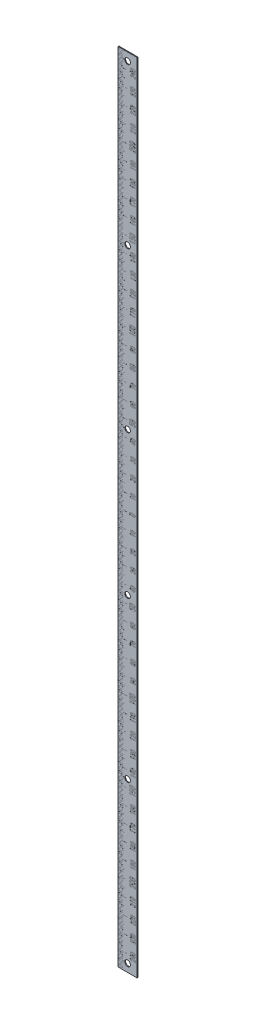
SolidWorks part; units mm, degrees
ref_plane "Front" through (0, 0, 0) normal (0, 0, 1) x (1, 0, 0)
ref_plane "Top" through (0, 0, 0) normal (0, 1, 0) x (1, 0, 0)
ref_plane "Right" through (0, 0, 0) normal (1, 0, 0) x (0, 0, -1)
sketch "Sketch1" plane through (0, 0, 0) normal (0, 0, 1) x (1, 0, 0)
  line L1 (0, 0) -> (0, 500)
  line L2 (0, 0) -> (12, 0)
  line L3 (12, 0) -> (12, 500)
  line L4 (0, 500) -> (12, 500)
  dimension "D1" = 500
  dimension "D2" = 12
extrude "Extrude1" add sketch "Sketch1" along normal blind 0.5
sketch "Sketch2" plane through (0, 0, 0.5) normal (0, 0, 1) x (1, 0, 0)
  line L0 (0, 500) -> (0, 0) construction
  line L1 (0, 0) -> (12, 0) construction
  line L2 (12, 500) -> (0, 500) construction
  circle A0 centre (6, 5) radius 1.75
  circle A1 centre (6, 495) radius 1.75
  circle A2 centre (6, 205) radius 1.75
  circle A3 centre (6, 395) radius 1.75
  circle A4 centre (6, 105) radius 1.75
  circle A5 centre (6, 295) radius 1.75
  dimension "D1" = 6
  dimension "D2" = 6
  dimension "D3" = 5
  dimension "D4" = 5
  dimension "D5" = 3.5
  dimension "D6" = 3.5
  dimension "D7" = 3.5
  dimension "D10" = 100
  dimension "D11" = 100
  dimension "D12" = 100
  dimension "D13" = 3.5
  dimension "D14" = 3.5
  dimension "D9" = 100
  dimension "D8" = 2
extrude "Extrude2" cut sketch "Sketch2" against normal through all
sketch "Sketch3" plane through (0, 0, 0.5) normal (0, 0, 1) x (1, 0, 0)
  line L0 (7.5, 188.25) -> (11, 188.25) construction
  line L1 (7.5, 137.4) -> (11, 137.4) construction
  line L2 (7.5, 137.4) -> (7.5, 140.9) construction
  line L3 (7.5, 140.9) -> (11, 140.9) construction
  line L4 (11, 137.4) -> (11, 140.9) construction
  line L5 (0, 500) -> (0, 0) construction
  line L6 (11, 127.4) -> (11, 130.9) construction
  line L7 (11, 117.4) -> (11, 120.9) construction
  line L8 (11, 107.4) -> (11, 110.9) construction
  line L9 (11, 97.2) -> (11, 102.8) construction
  line L10 (11, 87.4) -> (11, 90.9) construction
  line L11 (11, 77.4) -> (11, 80.9) construction
  line L12 (11, 67.4) -> (11, 70.9) construction
  line L13 (11, 57.4) -> (11, 60.9) construction
  line L14 (11, 47.2) -> (11, 52.8) construction
  line L15 (11, 37.4) -> (11, 42.65) construction
  line L16 (11, 110) -> (-11, 110) construction
  line L17 (11, 50) -> (-11, 50) construction
  line L18 (11, 27.4) -> (11, 32.65) construction
  line L19 (11, 17.4) -> (11, 22.65) construction
  line L20 (11, 7.4) -> (11, 12.65) construction
  line L21 (11, 100) -> (-11, 100) construction
  line L22 (11, 120) -> (-11, 120) construction
  line L23 (11, 130) -> (-11, 130) construction
  line L24 (11, 140) -> (-11, 140) construction
  line L25 (7.5, 188.25) -> (7.5, 191.75) construction
  line L26 (7.5, 191.75) -> (11, 191.75) construction
  line L27 (11, 188.25) -> (11, 191.75) construction
  line L28 (11, 178.25) -> (11, 181.75) construction
  line L29 (11, 168.25) -> (11, 171.75) construction
  line L30 (11, 158.25) -> (11, 161.75) construction
  line L31 (11, 147.2) -> (11, 152.8) construction
  line L32 (4.5, 160) -> (-4.9003, 160) construction
  line L33 (4.5, 150) -> (-4.9003, 150) construction
  line L34 (4.5, 170) -> (-4.9003, 170) construction
  line L35 (4.5, 180) -> (-4.9003, 180) construction
  line L36 (4.5, 190) -> (-4.9003, 190) construction
  line L37 (11, 40) -> (-11, 40) construction
  line L38 (11, 30) -> (-11, 30) construction
  line L39 (11, 20) -> (-11, 20) construction
  line L40 (11, 10) -> (-11, 10) construction
  line L41 (12, 0) -> (12, 500) construction
  line L42 (11, 90) -> (-11, 90) construction
  line L43 (7.5, 288.25) -> (11, 288.25) construction
  line L44 (7.5, 238.25) -> (11, 238.25) construction
  line L45 (7.5, 238.25) -> (7.5, 241.75) construction
  line L46 (7.5, 241.75) -> (11, 241.75) construction
  line L47 (11, 238.25) -> (11, 241.75) construction
  line L48 (11, 228.25) -> (11, 231.75) construction
  line L49 (11, 218.25) -> (11, 221.75) construction
  line L50 (11, 208.25) -> (11, 211.75) construction
  line L51 (11, 198) -> (11, 203.6) construction
  line L52 (5, 210) -> (-5, 210) construction
  line L53 (5, 200) -> (-5, 200) construction
  line L54 (5, 220) -> (-5, 220) construction
  line L55 (5, 230) -> (-5, 230) construction
  line L56 (5, 240) -> (-5, 240) construction
  line L57 (7.5, 288.25) -> (7.5, 291.75) construction
  line L58 (7.5, 291.75) -> (11, 291.75) construction
  line L59 (11, 288.25) -> (11, 291.75) construction
  line L60 (11, 278.25) -> (11, 281.75) construction
  line L61 (11, 268.25) -> (11, 271.75) construction
  line L62 (11, 258.25) -> (11, 261.75) construction
  line L63 (11, 249.1) -> (11, 253.9) construction
  line L64 (4.5, 260) -> (-4.9003, 260) construction
  line L65 (4.5, 250) -> (-4.9003, 250) construction
  line L66 (4.5, 270) -> (-4.9003, 270) construction
  line L67 (4.5, 280) -> (-4.9003, 280) construction
  line L68 (4.5, 290) -> (-4.9003, 290) construction
  line L69 (7.5, 387.4) -> (11, 387.4) construction
  line L70 (7.5, 338.25) -> (11, 338.25) construction
  line L71 (7.5, 338.25) -> (7.5, 341.75) construction
  line L72 (7.5, 341.75) -> (11, 341.75) construction
  line L73 (11, 338.25) -> (11, 341.75) construction
  line L74 (11, 328.25) -> (11, 331.75) construction
  line L75 (11, 318.25) -> (11, 321.75) construction
  line L76 (11, 308.25) -> (11, 311.75) construction
  line L77 (11, 298) -> (11, 303.6) construction
  line L78 (5, 310) -> (-5, 310) construction
  line L79 (5, 300) -> (-5, 300) construction
  line L80 (5, 320) -> (-5, 320) construction
  line L81 (5, 330) -> (-5, 330) construction
  line L82 (5, 340) -> (-5, 340) construction
  line L83 (7.5, 387.4) -> (7.5, 390.9) construction
  line L84 (7.5, 390.9) -> (11, 390.9) construction
  line L85 (11, 387.4) -> (11, 390.9) construction
  line L86 (11, 377.4) -> (11, 380.9) construction
  line L87 (11, 367.4) -> (11, 370.9) construction
  line L88 (11, 357.4) -> (11, 360.9) construction
  line L89 (11, 347.2) -> (11, 352) construction
  line L90 (4.5, 360) -> (-4.9003, 360) construction
  line L91 (4.5, 350) -> (-4.9003, 350) construction
  line L92 (4.5, 370) -> (-4.9003, 370) construction
  line L93 (4.5, 380) -> (-4.9003, 380) construction
  line L94 (4.5, 390) -> (-4.9003, 390) construction
  line L95 (7.5, 487.4) -> (11, 487.4) construction
  line L96 (7.5, 437.4) -> (11, 437.4) construction
  line L97 (7.5, 437.4) -> (7.5, 440.9) construction
  line L98 (7.5, 440.9) -> (11, 440.9) construction
  line L99 (11, 437.4) -> (11, 440.9) construction
  line L100 (11, 427.4) -> (11, 430.9) construction
  line L101 (11, 417.4) -> (11, 420.9) construction
  line L102 (11, 407.4) -> (11, 410.9) construction
  line L103 (11, 397.2) -> (11, 402.8) construction
  line L104 (5, 410) -> (-5, 410) construction
  line L105 (5, 400) -> (-5, 400) construction
  line L106 (5, 420) -> (-5, 420) construction
  line L107 (5, 430) -> (-5, 430) construction
  line L108 (5, 440) -> (-5, 440) construction
  line L109 (7.5, 487.4) -> (7.5, 490.9) construction
  line L110 (7.5, 490.9) -> (11, 490.9) construction
  line L111 (11, 487.4) -> (11, 490.9) construction
  line L112 (11, 477.4) -> (11, 480.9) construction
  line L113 (11, 467.4) -> (11, 470.9) construction
  line L114 (11, 457.4) -> (11, 460.9) construction
  line L115 (11, 447.2) -> (11, 452) construction
  line L116 (4.5, 460) -> (-4.9003, 460) construction
  line L117 (4.5, 450) -> (-4.9003, 450) construction
  line L118 (4.5, 470) -> (-4.9003, 470) construction
  line L119 (4.5, 480) -> (-4.9003, 480) construction
  line L120 (4.5, 490) -> (-4.9003, 490) construction
  line L121 (-18.8176, 250) -> (18.8176, 250) construction
  line L122 (5, 80) -> (-5, 80) construction
  line L123 (5, 70) -> (-5, 70) construction
  line L124 (5, 60) -> (-5, 60) construction
  text T0 "110" font "ＭＳ ゴシック" height in points 11
  text T1 "120  " font "ＭＳ ゴシック" height in points 11
  text T2 "130" font "ＭＳ ゴシック" height in points 11
  text T3 "140" font "ＭＳ ゴシック" height in points 11
  text T4 "150" font "ＭＳ ゴシック" height in points 13
  text T5 "160" font "ＭＳ ゴシック" height in points 11
  text T6 "170" font "ＭＳ ゴシック" height in points 11
  text T7 "180  " font "ＭＳ ゴシック" height in points 11
  text T8 "190" font "ＭＳ ゴシック" height in points 11
  text T9 "200" font "ＭＳ ゴシック" height in points 13
  text T10 "210" font "ＭＳ ゴシック" height in points 11
  text T11 "220" font "ＭＳ ゴシック" height in points 11
  text T12 "230" font "ＭＳ ゴシック" height in points 11
  text T13 "240" font "ＭＳ ゴシック" height in points 11
  text T14 "100" font "ＭＳ ゴシック" height in points 13
  text T15 "90" font "ＭＳ ゴシック" height in points 11
  text T16 "80" font "ＭＳ ゴシック" height in points 11
  text T17 "70" font "ＭＳ ゴシック" height in points 11
  text T18 "60  " font "ＭＳ ゴシック" height in points 11
  text T19 "0" font "ＭＳ ゴシック" height in points 13
  text T20 "10" font "ＭＳ ゴシック" height in points 11
  text T21 "20" font "ＭＳ ゴシック" height in points 11
  text T22 "30" font "ＭＳ ゴシック" height in points 11
  text T23 "40" font "ＭＳ ゴシック" height in points 11
  text T24 "50" font "ＭＳ ゴシック" height in points 13
  text T25 "60" font "ＭＳ ゴシック" height in points 11
  text T26 "70" font "ＭＳ ゴシック" height in points 11
  text T27 "80" font "ＭＳ ゴシック" height in points 12
  text T28 "90" font "ＭＳ ゴシック" height in points 11
  text T29 "100" font "ＭＳ ゴシック" height in points 13
  text T30 "110" font "ＭＳ ゴシック" height in points 11
  text T31 "120" font "ＭＳ ゴシック" height in points 11
  text T32 "130" font "ＭＳ ゴシック" height in points 11
  text T33 "140" font "ＭＳ ゴシック" height in points 11
  text T34 "150" font "ＭＳ ゴシック" height in points 13
  text T35 "160" font "ＭＳ ゴシック" height in points 11
  text T36 "170" font "ＭＳ ゴシック" height in points 11
  text T37 "180" font "ＭＳ ゴシック" height in points 11
  text T38 "190" font "ＭＳ ゴシック" height in points 11
  text T39 "200" font "ＭＳ ゴシック" height in points 13
  text T40 "210" font "ＭＳ ゴシック" height in points 11
  text T41 "220" font "ＭＳ ゴシック" height in points 11
  text T42 "230" font "ＭＳ ゴシック" height in points 11
  text T43 "240" font "ＭＳ ゴシック" height in points 11
  text T44 "10" font "ＭＳ ゴシック" height in points 11
  text T45 "20" font "ＭＳ ゴシック" height in points 11
  text T46 "30" font "ＭＳ ゴシック" height in points 11
  text T47 "50" font "ＭＳ ゴシック" height in points 13
  text T48 "40" font "ＭＳ ゴシック" height in points 11
  point P19 (11, 100)
  point P82 (0, 100)
  point P220 (0, 250)
  dimension "D1" = 3.5
  dimension "D2" = 2.6
  dimension "D4" = 3.5
  dimension "D8" = 2.8
  dimension "D9" = 0.9
  dimension "D10" = 2
  dimension "D11" = 5.6
  dimension "D12" = 2.6
  dimension "D5" = 3.5
  dimension "D13" = 2.6
  dimension "D14" = 2.6
  dimension "D15" = 1
  dimension "D16" = 2.6
  dimension "D17" = 2.6
  dimension "D18" = 2.6
  dimension "D19" = 2.6
  dimension "D20" = 1
  dimension "D21" = 1
  dimension "D23" = 2.6
  dimension "D24" = 2.8
  dimension "D25" = 1.75
  dimension "D26" = 1.75
  dimension "D27" = 1.75
  dimension "D28" = 1.75
  dimension "D29" = 2
  dimension "D30" = 2.8
  dimension "D31" = 2.6
  dimension "D32" = 2.6
  dimension "D33" = 2.6
  dimension "D34" = 2.6
  dimension "D35" = 2.8
  dimension "D36" = 2.6
  dimension "D37" = 2.6
  dimension "D38" = 2.6
  dimension "D39" = 2.6
  dimension "D40" = 2.8
  dimension "D41" = 2.6
  dimension "D42" = 2.6
  dimension "D43" = 2.6
  dimension "D44" = 2.6
  dimension "D45" = 2
  dimension "D46" = 2.6
  dimension "D47" = 2.6
  dimension "D48" = 2.6
  dimension "D49" = 1
  dimension "D6" = 5
  dimension "D7" = 5
  dimension "D22" = 2
extrude "Extrude3" cut sketch "Sketch3" against normal blind 0.01
sketch "Sketch4" plane through (0, 0, 0.5) normal (0, 0, 1) x (1, 0, 0)
  line L0 (3, 2.05) -> (3, 1.95)
  line L2 (0, 1.95) -> (3, 1.95)
  line L3 (0, 2.05) -> (3, 2.05)
  line L4 (0, 2.05) -> (0, 1.95)
  line L6 (3, 3.05) -> (3, 2.95)
  line L7 (0, 2.95) -> (3, 2.95)
  line L8 (0, 3.05) -> (3, 3.05)
  line L9 (0, 3.05) -> (0, 2.95)
  line L10 (3, 4.05) -> (3, 3.95)
  line L11 (0, 3.95) -> (3, 3.95)
  line L12 (0, 4.05) -> (3, 4.05)
  line L13 (0, 4.05) -> (0, 3.95)
  line L14 (3, 7.05) -> (3, 6.95)
  line L15 (0, 6.95) -> (3, 6.95)
  line L16 (0, 7.05) -> (3, 7.05)
  line L17 (0, 7.05) -> (0, 6.95)
  line L18 (3, 8.05) -> (3, 7.95)
  line L19 (0, 7.95) -> (3, 7.95)
  line L20 (0, 8.05) -> (3, 8.05)
  line L21 (0, 8.05) -> (0, 7.95)
  line L22 (3, 9.05) -> (3, 8.95)
  line L23 (0, 8.95) -> (3, 8.95)
  line L24 (0, 9.05) -> (3, 9.05)
  line L25 (0, 9.05) -> (0, 8.95)
  line L26 (3, 6.05) -> (3, 5.95)
  line L27 (0, 5.95) -> (3, 5.95)
  line L28 (0, 6.05) -> (3, 6.05)
  line L29 (0, 6.05) -> (0, 5.95)
  line L30 (3, 12.05) -> (3, 11.95)
  line L31 (0, 11.95) -> (3, 11.95)
  line L32 (0, 12.05) -> (3, 12.05)
  line L33 (0, 12.05) -> (0, 11.95)
  line L34 (3, 13.05) -> (3, 12.95)
  line L35 (0, 12.95) -> (3, 12.95)
  line L36 (0, 13.05) -> (3, 13.05)
  line L37 (0, 13.05) -> (0, 12.95)
  line L38 (3, 14.05) -> (3, 13.95)
  line L39 (0, 13.95) -> (3, 13.95)
  line L40 (0, 14.05) -> (3, 14.05)
  line L41 (0, 14.05) -> (0, 13.95)
  line L42 (3, 17.05) -> (3, 16.95)
  line L43 (0, 16.95) -> (3, 16.95)
  line L44 (0, 17.05) -> (3, 17.05)
  line L45 (0, 17.05) -> (0, 16.95)
  line L46 (3, 18.05) -> (3, 17.95)
  line L47 (0, 17.95) -> (3, 17.95)
  line L48 (0, 18.05) -> (3, 18.05)
  line L49 (0, 18.05) -> (0, 17.95)
  line L50 (3, 19.05) -> (3, 18.95)
  line L51 (0, 18.95) -> (3, 18.95)
  line L52 (0, 19.05) -> (3, 19.05)
  line L53 (0, 19.05) -> (0, 18.95)
  line L54 (3, 16.05) -> (3, 15.95)
  line L55 (0, 15.95) -> (3, 15.95)
  line L56 (0, 16.05) -> (3, 16.05)
  line L57 (0, 16.05) -> (0, 15.95)
  line L58 (3, 11.05) -> (3, 10.95)
  line L59 (0, 10.95) -> (3, 10.95)
  line L60 (0, 11.05) -> (3, 11.05)
  line L61 (0, 11.05) -> (0, 10.95)
  line L62 (4, 14.95) -> (4, 15.05)
  line L63 (0, 15.05) -> (4, 15.05)
  line L64 (0, 14.95) -> (0, 15.05)
  line L65 (0, 14.95) -> (4, 14.95)
  line L66 (0, 19.95) -> (0, 20.05)
  line L67 (5.5, 19.95) -> (0, 19.95)
  line L68 (5.5, 20.05) -> (5.5, 19.95)
  line L69 (0, 20.05) -> (5.5, 20.05)
  line L70 (3, 22.05) -> (3, 21.95)
  line L71 (0, 21.95) -> (3, 21.95)
  line L72 (0, 22.05) -> (3, 22.05)
  line L73 (0, 22.05) -> (0, 21.95)
  line L74 (3, 23.05) -> (3, 22.95)
  line L75 (0, 22.95) -> (3, 22.95)
  line L76 (0, 23.05) -> (3, 23.05)
  line L77 (0, 23.05) -> (0, 22.95)
  line L78 (3, 24.05) -> (3, 23.95)
  line L79 (0, 23.95) -> (3, 23.95)
  line L80 (0, 24.05) -> (3, 24.05)
  line L81 (0, 24.05) -> (0, 23.95)
  line L82 (3, 27.05) -> (3, 26.95)
  line L83 (0, 26.95) -> (3, 26.95)
  line L84 (0, 27.05) -> (3, 27.05)
  line L85 (0, 27.05) -> (0, 26.95)
  line L86 (3, 28.05) -> (3, 27.95)
  line L87 (0, 27.95) -> (3, 27.95)
  line L88 (0, 28.05) -> (3, 28.05)
  line L89 (0, 28.05) -> (0, 27.95)
  line L90 (3, 29.05) -> (3, 28.95)
  line L91 (0, 28.95) -> (3, 28.95)
  line L92 (0, 29.05) -> (3, 29.05)
  line L93 (0, 29.05) -> (0, 28.95)
  line L94 (3, 26.05) -> (3, 25.95)
  line L95 (0, 25.95) -> (3, 25.95)
  line L96 (0, 26.05) -> (3, 26.05)
  line L97 (0, 26.05) -> (0, 25.95)
  line L98 (3, 21.05) -> (3, 20.95)
  line L99 (0, 20.95) -> (3, 20.95)
  line L100 (0, 21.05) -> (3, 21.05)
  line L101 (0, 21.05) -> (0, 20.95)
  line L102 (4, 24.95) -> (4, 25.05)
  line L103 (0, 25.05) -> (4, 25.05)
  line L104 (0, 24.95) -> (0, 25.05)
  line L105 (0, 24.95) -> (4, 24.95)
  line L106 (0, 29.95) -> (0, 30.05)
  line L107 (5.5, 29.95) -> (0, 29.95)
  line L108 (5.5, 30.05) -> (5.5, 29.95)
  line L109 (0, 30.05) -> (5.5, 30.05)
  line L110 (3, 32.05) -> (3, 31.95)
  line L111 (0, 31.95) -> (3, 31.95)
  line L112 (0, 32.05) -> (3, 32.05)
  line L113 (0, 32.05) -> (0, 31.95)
  line L114 (3, 33.05) -> (3, 32.95)
  line L115 (0, 32.95) -> (3, 32.95)
  line L116 (0, 33.05) -> (3, 33.05)
  line L117 (0, 33.05) -> (0, 32.95)
  line L118 (3, 34.05) -> (3, 33.95)
  line L119 (0, 33.95) -> (3, 33.95)
  line L120 (0, 34.05) -> (3, 34.05)
  line L121 (0, 34.05) -> (0, 33.95)
  line L122 (3, 37.05) -> (3, 36.95)
  line L123 (0, 36.95) -> (3, 36.95)
  line L124 (0, 37.05) -> (3, 37.05)
  line L125 (0, 37.05) -> (0, 36.95)
  line L126 (3, 38.05) -> (3, 37.95)
  line L127 (0, 37.95) -> (3, 37.95)
  line L128 (0, 38.05) -> (3, 38.05)
  line L129 (0, 38.05) -> (0, 37.95)
  line L130 (3, 39.05) -> (3, 38.95)
  line L131 (0, 38.95) -> (3, 38.95)
  line L132 (0, 39.05) -> (3, 39.05)
  line L133 (0, 39.05) -> (0, 38.95)
  line L134 (3, 36.05) -> (3, 35.95)
  line L135 (0, 35.95) -> (3, 35.95)
  line L136 (0, 36.05) -> (3, 36.05)
  line L137 (0, 36.05) -> (0, 35.95)
  line L138 (3, 31.05) -> (3, 30.95)
  line L139 (0, 30.95) -> (3, 30.95)
  line L140 (0, 31.05) -> (3, 31.05)
  line L141 (0, 31.05) -> (0, 30.95)
  line L142 (4, 34.95) -> (4, 35.05)
  line L143 (0, 35.05) -> (4, 35.05)
  line L144 (0, 34.95) -> (0, 35.05)
  line L145 (0, 34.95) -> (4, 34.95)
  line L146 (0, 39.95) -> (0, 40.05)
  line L147 (5.5, 39.95) -> (0, 39.95)
  line L148 (5.5, 40.05) -> (5.5, 39.95)
  line L149 (0, 40.05) -> (5.5, 40.05)
  line L150 (3, 42.05) -> (3, 41.95)
  line L151 (0, 41.95) -> (3, 41.95)
  line L152 (0, 42.05) -> (3, 42.05)
  line L153 (0, 42.05) -> (0, 41.95)
  line L154 (3, 43.05) -> (3, 42.95)
  line L155 (0, 42.95) -> (3, 42.95)
  line L156 (0, 43.05) -> (3, 43.05)
  line L157 (0, 43.05) -> (0, 42.95)
  line L158 (3, 44.05) -> (3, 43.95)
  line L159 (0, 43.95) -> (3, 43.95)
  line L160 (0, 44.05) -> (3, 44.05)
  line L161 (0, 44.05) -> (0, 43.95)
  line L162 (3, 47.05) -> (3, 46.95)
  line L163 (0, 46.95) -> (3, 46.95)
  line L164 (0, 47.05) -> (3, 47.05)
  line L165 (0, 47.05) -> (0, 46.95)
  line L166 (3, 48.05) -> (3, 47.95)
  line L167 (0, 47.95) -> (3, 47.95)
  line L168 (0, 48.05) -> (3, 48.05)
  line L169 (0, 48.05) -> (0, 47.95)
  line L170 (3, 49.05) -> (3, 48.95)
  line L171 (0, 48.95) -> (3, 48.95)
  line L172 (0, 49.05) -> (3, 49.05)
  line L173 (0, 49.05) -> (0, 48.95)
  line L174 (3, 46.05) -> (3, 45.95)
  line L175 (0, 45.95) -> (3, 45.95)
  line L176 (0, 46.05) -> (3, 46.05)
  line L177 (0, 46.05) -> (0, 45.95)
  line L178 (3, 41.05) -> (3, 40.95)
  line L179 (0, 40.95) -> (3, 40.95)
  line L180 (0, 41.05) -> (3, 41.05)
  line L181 (0, 41.05) -> (0, 40.95)
  line L182 (4, 44.95) -> (4, 45.05)
  line L183 (0, 45.05) -> (4, 45.05)
  line L184 (0, 44.95) -> (0, 45.05)
  line L185 (0, 44.95) -> (4, 44.95)
  line L186 (0, 49.95) -> (0, 50.05)
  line L187 (5.5, 49.95) -> (0, 49.95)
  line L188 (5.5, 50.05) -> (5.5, 49.95)
  line L189 (0, 50.05) -> (5.5, 50.05)
  line L190 (3, 52.05) -> (3, 51.95)
  line L191 (0, 51.95) -> (3, 51.95)
  line L192 (0, 52.05) -> (3, 52.05)
  line L193 (0, 52.05) -> (0, 51.95)
  line L194 (3, 53.05) -> (3, 52.95)
  line L195 (0, 52.95) -> (3, 52.95)
  line L196 (0, 53.05) -> (3, 53.05)
  line L197 (0, 53.05) -> (0, 52.95)
  line L198 (3, 54.05) -> (3, 53.95)
  line L199 (0, 53.95) -> (3, 53.95)
  line L200 (0, 54.05) -> (3, 54.05)
  line L201 (0, 54.05) -> (0, 53.95)
  line L202 (3, 57.05) -> (3, 56.95)
  line L203 (0, 56.95) -> (3, 56.95)
  line L204 (0, 57.05) -> (3, 57.05)
  line L205 (0, 57.05) -> (0, 56.95)
  line L206 (3, 58.05) -> (3, 57.95)
  line L207 (0, 57.95) -> (3, 57.95)
  line L208 (0, 58.05) -> (3, 58.05)
  line L209 (0, 58.05) -> (0, 57.95)
  line L210 (3, 59.05) -> (3, 58.95)
  line L211 (0, 58.95) -> (3, 58.95)
  line L212 (0, 59.05) -> (3, 59.05)
  line L213 (0, 59.05) -> (0, 58.95)
  line L214 (3, 56.05) -> (3, 55.95)
  line L215 (0, 55.95) -> (3, 55.95)
  line L216 (0, 56.05) -> (3, 56.05)
  line L217 (0, 56.05) -> (0, 55.95)
  line L218 (3, 51.05) -> (3, 50.95)
  line L219 (0, 50.95) -> (3, 50.95)
  line L220 (0, 51.05) -> (3, 51.05)
  line L221 (0, 51.05) -> (0, 50.95)
  line L222 (4, 54.95) -> (4, 55.05)
  line L223 (0, 55.05) -> (4, 55.05)
  line L224 (0, 54.95) -> (0, 55.05)
  line L225 (0, 54.95) -> (4, 54.95)
  line L226 (0, 59.95) -> (0, 60.05)
  line L227 (5.5, 59.95) -> (0, 59.95)
  line L228 (5.5, 60.05) -> (5.5, 59.95)
  line L229 (0, 60.05) -> (5.5, 60.05)
  line L230 (3, 62.05) -> (3, 61.95)
  line L231 (0, 61.95) -> (3, 61.95)
  line L232 (0, 62.05) -> (3, 62.05)
  line L233 (0, 62.05) -> (0, 61.95)
  line L234 (3, 63.05) -> (3, 62.95)
  line L235 (0, 62.95) -> (3, 62.95)
  line L236 (0, 63.05) -> (3, 63.05)
  line L237 (0, 63.05) -> (0, 62.95)
  line L238 (3, 64.05) -> (3, 63.95)
  line L239 (0, 63.95) -> (3, 63.95)
  line L240 (0, 64.05) -> (3, 64.05)
  line L241 (0, 64.05) -> (0, 63.95)
  line L242 (3, 67.05) -> (3, 66.95)
  line L243 (0, 66.95) -> (3, 66.95)
  line L244 (0, 67.05) -> (3, 67.05)
  line L245 (0, 67.05) -> (0, 66.95)
  line L246 (3, 68.05) -> (3, 67.95)
  line L247 (0, 67.95) -> (3, 67.95)
  line L248 (0, 68.05) -> (3, 68.05)
  line L249 (0, 68.05) -> (0, 67.95)
  line L250 (3, 69.05) -> (3, 68.95)
  line L251 (0, 68.95) -> (3, 68.95)
  line L252 (0, 69.05) -> (3, 69.05)
  line L253 (0, 69.05) -> (0, 68.95)
  line L254 (3, 66.05) -> (3, 65.95)
  line L255 (0, 65.95) -> (3, 65.95)
  line L256 (0, 66.05) -> (3, 66.05)
  line L257 (0, 66.05) -> (0, 65.95)
  line L258 (3, 61.05) -> (3, 60.95)
  line L259 (0, 60.95) -> (3, 60.95)
  line L260 (0, 61.05) -> (3, 61.05)
  line L261 (0, 61.05) -> (0, 60.95)
  line L262 (4, 64.95) -> (4, 65.05)
  line L263 (0, 65.05) -> (4, 65.05)
  line L264 (0, 64.95) -> (0, 65.05)
  line L265 (0, 64.95) -> (4, 64.95)
  line L266 (0, 69.95) -> (0, 70.05)
  line L267 (5.5, 69.95) -> (0, 69.95)
  line L268 (5.5, 70.05) -> (5.5, 69.95)
  line L269 (0, 70.05) -> (5.5, 70.05)
  line L270 (3, 72.05) -> (3, 71.95)
  line L271 (0, 71.95) -> (3, 71.95)
  line L272 (0, 72.05) -> (3, 72.05)
  line L273 (0, 72.05) -> (0, 71.95)
  line L274 (3, 73.05) -> (3, 72.95)
  line L275 (0, 72.95) -> (3, 72.95)
  line L276 (0, 73.05) -> (3, 73.05)
  line L277 (0, 73.05) -> (0, 72.95)
  line L278 (3, 74.05) -> (3, 73.95)
  line L279 (0, 73.95) -> (3, 73.95)
  line L280 (0, 74.05) -> (3, 74.05)
  line L281 (0, 74.05) -> (0, 73.95)
  line L282 (3, 77.05) -> (3, 76.95)
  line L283 (0, 76.95) -> (3, 76.95)
  line L284 (0, 77.05) -> (3, 77.05)
  line L285 (0, 77.05) -> (0, 76.95)
  line L286 (3, 78.05) -> (3, 77.95)
  line L287 (0, 77.95) -> (3, 77.95)
  line L288 (0, 78.05) -> (3, 78.05)
  line L289 (0, 78.05) -> (0, 77.95)
  line L290 (3, 79.05) -> (3, 78.95)
  line L291 (0, 78.95) -> (3, 78.95)
  line L292 (0, 79.05) -> (3, 79.05)
  line L293 (0, 79.05) -> (0, 78.95)
  line L294 (3, 76.05) -> (3, 75.95)
  line L295 (0, 75.95) -> (3, 75.95)
  line L296 (0, 76.05) -> (3, 76.05)
  line L297 (0, 76.05) -> (0, 75.95)
  line L298 (3, 71.05) -> (3, 70.95)
  line L299 (0, 70.95) -> (3, 70.95)
  line L300 (0, 71.05) -> (3, 71.05)
  line L301 (0, 71.05) -> (0, 70.95)
  line L302 (4, 74.95) -> (4, 75.05)
  line L303 (0, 75.05) -> (4, 75.05)
  line L304 (0, 74.95) -> (0, 75.05)
  line L305 (0, 74.95) -> (4, 74.95)
  line L306 (0, 79.95) -> (0, 80.05)
  line L307 (5.5, 79.95) -> (0, 79.95)
  line L308 (5.5, 80.05) -> (5.5, 79.95)
  line L309 (0, 80.05) -> (5.5, 80.05)
  line L310 (3, 82.05) -> (3, 81.95)
  line L311 (0, 81.95) -> (3, 81.95)
  line L312 (0, 82.05) -> (3, 82.05)
  line L313 (0, 82.05) -> (0, 81.95)
  line L314 (3, 83.05) -> (3, 82.95)
  line L315 (0, 82.95) -> (3, 82.95)
  line L316 (0, 83.05) -> (3, 83.05)
  line L317 (0, 83.05) -> (0, 82.95)
  line L318 (3, 84.05) -> (3, 83.95)
  line L319 (0, 83.95) -> (3, 83.95)
  line L320 (0, 84.05) -> (3, 84.05)
  line L321 (0, 84.05) -> (0, 83.95)
  line L322 (3, 87.05) -> (3, 86.95)
  line L323 (0, 86.95) -> (3, 86.95)
  line L324 (0, 87.05) -> (3, 87.05)
  line L325 (0, 87.05) -> (0, 86.95)
  line L326 (3, 88.05) -> (3, 87.95)
  line L327 (0, 87.95) -> (3, 87.95)
  line L328 (0, 88.05) -> (3, 88.05)
  line L329 (0, 88.05) -> (0, 87.95)
  line L330 (3, 89.05) -> (3, 88.95)
  line L331 (0, 88.95) -> (3, 88.95)
  line L332 (0, 89.05) -> (3, 89.05)
  line L333 (0, 89.05) -> (0, 88.95)
  line L334 (3, 86.05) -> (3, 85.95)
  line L335 (0, 85.95) -> (3, 85.95)
  line L336 (0, 86.05) -> (3, 86.05)
  line L337 (0, 86.05) -> (0, 85.95)
  line L338 (3, 81.05) -> (3, 80.95)
  line L339 (0, 80.95) -> (3, 80.95)
  line L340 (0, 81.05) -> (3, 81.05)
  line L341 (0, 81.05) -> (0, 80.95)
  line L342 (4, 84.95) -> (4, 85.05)
  line L343 (0, 85.05) -> (4, 85.05)
  line L344 (0, 84.95) -> (0, 85.05)
  line L345 (0, 84.95) -> (4, 84.95)
  line L346 (0, 89.95) -> (0, 90.05)
  line L347 (5.5, 89.95) -> (0, 89.95)
  line L348 (5.5, 90.05) -> (5.5, 89.95)
  line L349 (0, 90.05) -> (5.5, 90.05)
  line L350 (3, 92.05) -> (3, 91.95)
  line L351 (0, 91.95) -> (3, 91.95)
  line L352 (0, 92.05) -> (3, 92.05)
  line L353 (0, 92.05) -> (0, 91.95)
  line L354 (3, 93.05) -> (3, 92.95)
  line L355 (0, 92.95) -> (3, 92.95)
  line L356 (0, 93.05) -> (3, 93.05)
  line L357 (0, 93.05) -> (0, 92.95)
  line L358 (3, 94.05) -> (3, 93.95)
  line L359 (0, 93.95) -> (3, 93.95)
  line L360 (0, 94.05) -> (3, 94.05)
  line L361 (0, 94.05) -> (0, 93.95)
  line L362 (3, 97.05) -> (3, 96.95)
  line L363 (0, 96.95) -> (3, 96.95)
  line L364 (0, 97.05) -> (3, 97.05)
  line L365 (0, 97.05) -> (0, 96.95)
  line L366 (3, 98.05) -> (3, 97.95)
  line L367 (0, 97.95) -> (3, 97.95)
  line L368 (0, 98.05) -> (3, 98.05)
  line L369 (0, 98.05) -> (0, 97.95)
  line L370 (3, 99.05) -> (3, 98.95)
  line L371 (0, 98.95) -> (3, 98.95)
  line L372 (0, 99.05) -> (3, 99.05)
  line L373 (0, 99.05) -> (0, 98.95)
  line L374 (3, 96.05) -> (3, 95.95)
  line L375 (0, 95.95) -> (3, 95.95)
  line L376 (0, 96.05) -> (3, 96.05)
  line L377 (0, 96.05) -> (0, 95.95)
  line L378 (3, 91.05) -> (3, 90.95)
  line L379 (0, 90.95) -> (3, 90.95)
  line L380 (0, 91.05) -> (3, 91.05)
  line L381 (0, 91.05) -> (0, 90.95)
  line L382 (4, 94.95) -> (4, 95.05)
  line L383 (0, 95.05) -> (4, 95.05)
  line L384 (0, 94.95) -> (0, 95.05)
  line L385 (0, 94.95) -> (4, 94.95)
  line L386 (0, 99.95) -> (0, 100.05)
  line L387 (5.5, 99.95) -> (0, 99.95)
  line L388 (5.5, 100.05) -> (5.5, 99.95)
  line L389 (0, 100.05) -> (5.5, 100.05)
  line L390 (3, 102.05) -> (3, 101.95)
  line L391 (0, 101.95) -> (3, 101.95)
  line L392 (0, 102.05) -> (3, 102.05)
  line L393 (0, 102.05) -> (0, 101.95)
  line L394 (3, 103.05) -> (3, 102.95)
  line L395 (0, 102.95) -> (3, 102.95)
  line L396 (0, 103.05) -> (3, 103.05)
  line L397 (0, 103.05) -> (0, 102.95)
  line L398 (3, 104.05) -> (3, 103.95)
  line L399 (0, 103.95) -> (3, 103.95)
  line L400 (0, 104.05) -> (3, 104.05)
  line L401 (0, 104.05) -> (0, 103.95)
  line L402 (3, 107.05) -> (3, 106.95)
  line L403 (0, 106.95) -> (3, 106.95)
  line L404 (0, 107.05) -> (3, 107.05)
  line L405 (0, 107.05) -> (0, 106.95)
  line L406 (3, 108.05) -> (3, 107.95)
  line L407 (0, 107.95) -> (3, 107.95)
  line L408 (0, 108.05) -> (3, 108.05)
  line L409 (0, 108.05) -> (0, 107.95)
  line L410 (3, 109.05) -> (3, 108.95)
  line L411 (0, 108.95) -> (3, 108.95)
  line L412 (0, 109.05) -> (3, 109.05)
  line L413 (0, 109.05) -> (0, 108.95)
  line L414 (3, 106.05) -> (3, 105.95)
  line L415 (0, 105.95) -> (3, 105.95)
  line L416 (0, 106.05) -> (3, 106.05)
  line L417 (0, 106.05) -> (0, 105.95)
  line L418 (3, 101.05) -> (3, 100.95)
  line L419 (0, 100.95) -> (3, 100.95)
  line L420 (0, 101.05) -> (3, 101.05)
  line L421 (0, 101.05) -> (0, 100.95)
  line L422 (4, 104.95) -> (4, 105.05)
  line L423 (0, 105.05) -> (4, 105.05)
  line L424 (0, 104.95) -> (0, 105.05)
  line L425 (0, 104.95) -> (4, 104.95)
  line L426 (0, 109.95) -> (0, 110.05)
  line L427 (5.5, 109.95) -> (0, 109.95)
  line L428 (5.5, 110.05) -> (5.5, 109.95)
  line L429 (0, 110.05) -> (5.5, 110.05)
  line L430 (3, 112.05) -> (3, 111.95)
  line L431 (0, 111.95) -> (3, 111.95)
  line L432 (0, 112.05) -> (3, 112.05)
  line L433 (0, 112.05) -> (0, 111.95)
  line L434 (3, 113.05) -> (3, 112.95)
  line L435 (0, 112.95) -> (3, 112.95)
  line L436 (0, 113.05) -> (3, 113.05)
  line L437 (0, 113.05) -> (0, 112.95)
  line L438 (3, 114.05) -> (3, 113.95)
  line L439 (0, 113.95) -> (3, 113.95)
  line L440 (0, 114.05) -> (3, 114.05)
  line L441 (0, 114.05) -> (0, 113.95)
  line L442 (3, 117.05) -> (3, 116.95)
  line L443 (0, 116.95) -> (3, 116.95)
  line L444 (0, 117.05) -> (3, 117.05)
  line L445 (0, 117.05) -> (0, 116.95)
  line L446 (3, 118.05) -> (3, 117.95)
  line L447 (0, 117.95) -> (3, 117.95)
  line L448 (0, 118.05) -> (3, 118.05)
  line L449 (0, 118.05) -> (0, 117.95)
  line L450 (3, 119.05) -> (3, 118.95)
  line L451 (0, 118.95) -> (3, 118.95)
  line L452 (0, 119.05) -> (3, 119.05)
  line L453 (0, 119.05) -> (0, 118.95)
  line L454 (3, 116.05) -> (3, 115.95)
  line L455 (0, 115.95) -> (3, 115.95)
  line L456 (0, 116.05) -> (3, 116.05)
  line L457 (0, 116.05) -> (0, 115.95)
  line L458 (3, 111.05) -> (3, 110.95)
  line L459 (0, 110.95) -> (3, 110.95)
  line L460 (0, 111.05) -> (3, 111.05)
  line L461 (0, 111.05) -> (0, 110.95)
  line L462 (4, 114.95) -> (4, 115.05)
  line L463 (0, 115.05) -> (4, 115.05)
  line L464 (0, 114.95) -> (0, 115.05)
  line L465 (0, 114.95) -> (4, 114.95)
  line L466 (0, 119.95) -> (0, 120.05)
  line L467 (5.5, 119.95) -> (0, 119.95)
  line L468 (5.5, 120.05) -> (5.5, 119.95)
  line L469 (0, 120.05) -> (5.5, 120.05)
  line L470 (3, 122.05) -> (3, 121.95)
  line L471 (0, 121.95) -> (3, 121.95)
  line L472 (0, 122.05) -> (3, 122.05)
  line L473 (0, 122.05) -> (0, 121.95)
  line L474 (3, 123.05) -> (3, 122.95)
  line L475 (0, 122.95) -> (3, 122.95)
  line L476 (0, 123.05) -> (3, 123.05)
  line L477 (0, 123.05) -> (0, 122.95)
  line L478 (3, 124.05) -> (3, 123.95)
  line L479 (0, 123.95) -> (3, 123.95)
  line L480 (0, 124.05) -> (3, 124.05)
  line L481 (0, 124.05) -> (0, 123.95)
  line L482 (3, 127.05) -> (3, 126.95)
  line L483 (0, 126.95) -> (3, 126.95)
  line L484 (0, 127.05) -> (3, 127.05)
  line L485 (0, 127.05) -> (0, 126.95)
  line L486 (3, 128.05) -> (3, 127.95)
  line L487 (0, 127.95) -> (3, 127.95)
  line L488 (0, 128.05) -> (3, 128.05)
  line L489 (0, 128.05) -> (0, 127.95)
  line L490 (3, 129.05) -> (3, 128.95)
  line L491 (0, 128.95) -> (3, 128.95)
  line L492 (0, 129.05) -> (3, 129.05)
  line L493 (0, 129.05) -> (0, 128.95)
  line L494 (3, 126.05) -> (3, 125.95)
  line L495 (0, 125.95) -> (3, 125.95)
  line L496 (0, 126.05) -> (3, 126.05)
  line L497 (0, 126.05) -> (0, 125.95)
  line L498 (3, 121.05) -> (3, 120.95)
  line L499 (0, 120.95) -> (3, 120.95)
  line L500 (0, 121.05) -> (3, 121.05)
  line L501 (0, 121.05) -> (0, 120.95)
  line L502 (4, 124.95) -> (4, 125.05)
  line L503 (0, 125.05) -> (4, 125.05)
  line L504 (0, 124.95) -> (0, 125.05)
  line L505 (0, 124.95) -> (4, 124.95)
  line L506 (0, 129.95) -> (0, 130.05)
  line L507 (5.5, 129.95) -> (0, 129.95)
  line L508 (5.5, 130.05) -> (5.5, 129.95)
  line L509 (0, 130.05) -> (5.5, 130.05)
  line L510 (3, 132.05) -> (3, 131.95)
  line L511 (0, 131.95) -> (3, 131.95)
  line L512 (0, 132.05) -> (3, 132.05)
  line L513 (0, 132.05) -> (0, 131.95)
  line L514 (3, 133.05) -> (3, 132.95)
  line L515 (0, 132.95) -> (3, 132.95)
  line L516 (0, 133.05) -> (3, 133.05)
  line L517 (0, 133.05) -> (0, 132.95)
  line L518 (3, 134.05) -> (3, 133.95)
  line L519 (0, 133.95) -> (3, 133.95)
  line L520 (0, 134.05) -> (3, 134.05)
  line L521 (0, 134.05) -> (0, 133.95)
  line L522 (3, 137.05) -> (3, 136.95)
  line L523 (0, 136.95) -> (3, 136.95)
  line L524 (0, 137.05) -> (3, 137.05)
  line L525 (0, 137.05) -> (0, 136.95)
  line L526 (3, 138.05) -> (3, 137.95)
  line L527 (0, 137.95) -> (3, 137.95)
  line L528 (0, 138.05) -> (3, 138.05)
  line L529 (0, 138.05) -> (0, 137.95)
  line L530 (3, 139.05) -> (3, 138.95)
  line L531 (0, 138.95) -> (3, 138.95)
  line L532 (0, 139.05) -> (3, 139.05)
  line L533 (0, 139.05) -> (0, 138.95)
  line L534 (3, 136.05) -> (3, 135.95)
  line L535 (0, 135.95) -> (3, 135.95)
  line L536 (0, 136.05) -> (3, 136.05)
  line L537 (0, 136.05) -> (0, 135.95)
  line L538 (3, 131.05) -> (3, 130.95)
  line L539 (0, 130.95) -> (3, 130.95)
  line L540 (0, 131.05) -> (3, 131.05)
  line L541 (0, 131.05) -> (0, 130.95)
  line L542 (4, 134.95) -> (4, 135.05)
  line L543 (0, 135.05) -> (4, 135.05)
  line L544 (0, 134.95) -> (0, 135.05)
  line L545 (0, 134.95) -> (4, 134.95)
  line L546 (0, 139.95) -> (0, 140.05)
  line L547 (5.5, 139.95) -> (0, 139.95)
  line L548 (5.5, 140.05) -> (5.5, 139.95)
  line L549 (0, 140.05) -> (5.5, 140.05)
  line L550 (3, 142.05) -> (3, 141.95)
  line L551 (0, 141.95) -> (3, 141.95)
  line L552 (0, 142.05) -> (3, 142.05)
  line L553 (0, 142.05) -> (0, 141.95)
  line L554 (3, 143.05) -> (3, 142.95)
  line L555 (0, 142.95) -> (3, 142.95)
  line L556 (0, 143.05) -> (3, 143.05)
  line L557 (0, 143.05) -> (0, 142.95)
  line L558 (3, 144.05) -> (3, 143.95)
  line L559 (0, 143.95) -> (3, 143.95)
  line L560 (0, 144.05) -> (3, 144.05)
  line L561 (0, 144.05) -> (0, 143.95)
  line L562 (3, 147.05) -> (3, 146.95)
  line L563 (0, 146.95) -> (3, 146.95)
  line L564 (0, 147.05) -> (3, 147.05)
  line L565 (0, 147.05) -> (0, 146.95)
  line L566 (3, 148.05) -> (3, 147.95)
  line L567 (0, 147.95) -> (3, 147.95)
  line L568 (0, 148.05) -> (3, 148.05)
  line L569 (0, 148.05) -> (0, 147.95)
  line L570 (3, 149.05) -> (3, 148.95)
  line L571 (0, 148.95) -> (3, 148.95)
  line L572 (0, 149.05) -> (3, 149.05)
  line L573 (0, 149.05) -> (0, 148.95)
  line L574 (3, 146.05) -> (3, 145.95)
  line L575 (0, 145.95) -> (3, 145.95)
  line L576 (0, 146.05) -> (3, 146.05)
  line L577 (0, 146.05) -> (0, 145.95)
  line L578 (3, 141.05) -> (3, 140.95)
  line L579 (0, 140.95) -> (3, 140.95)
  line L580 (0, 141.05) -> (3, 141.05)
  line L581 (0, 141.05) -> (0, 140.95)
  line L582 (4, 144.95) -> (4, 145.05)
  line L583 (0, 145.05) -> (4, 145.05)
  line L584 (0, 144.95) -> (0, 145.05)
  line L585 (0, 144.95) -> (4, 144.95)
  line L586 (0, 149.95) -> (0, 150.05)
  line L587 (5.5, 149.95) -> (0, 149.95)
  line L588 (5.5, 150.05) -> (5.5, 149.95)
  line L589 (0, 150.05) -> (5.5, 150.05)
  line L590 (3, 152.05) -> (3, 151.95)
  line L591 (0, 151.95) -> (3, 151.95)
  line L592 (0, 152.05) -> (3, 152.05)
  line L593 (0, 152.05) -> (0, 151.95)
  line L594 (3, 153.05) -> (3, 152.95)
  line L595 (0, 152.95) -> (3, 152.95)
  line L596 (0, 153.05) -> (3, 153.05)
  line L597 (0, 153.05) -> (0, 152.95)
  line L598 (3, 154.05) -> (3, 153.95)
  line L599 (0, 153.95) -> (3, 153.95)
  line L600 (0, 154.05) -> (3, 154.05)
  line L601 (0, 154.05) -> (0, 153.95)
  line L602 (3, 157.05) -> (3, 156.95)
  line L603 (0, 156.95) -> (3, 156.95)
  line L604 (0, 157.05) -> (3, 157.05)
  line L605 (0, 157.05) -> (0, 156.95)
  line L606 (3, 158.05) -> (3, 157.95)
  line L607 (0, 157.95) -> (3, 157.95)
  line L608 (0, 158.05) -> (3, 158.05)
  line L609 (0, 158.05) -> (0, 157.95)
  line L610 (3, 159.05) -> (3, 158.95)
  line L611 (0, 158.95) -> (3, 158.95)
  line L612 (0, 159.05) -> (3, 159.05)
  line L613 (0, 159.05) -> (0, 158.95)
  line L614 (3, 156.05) -> (3, 155.95)
  line L615 (0, 155.95) -> (3, 155.95)
  line L616 (0, 156.05) -> (3, 156.05)
  line L617 (0, 156.05) -> (0, 155.95)
  line L618 (3, 151.05) -> (3, 150.95)
  line L619 (0, 150.95) -> (3, 150.95)
  line L620 (0, 151.05) -> (3, 151.05)
  line L621 (0, 151.05) -> (0, 150.95)
  line L622 (4, 154.95) -> (4, 155.05)
  line L623 (0, 155.05) -> (4, 155.05)
  line L624 (0, 154.95) -> (0, 155.05)
  line L625 (0, 154.95) -> (4, 154.95)
  line L626 (0, 159.95) -> (0, 160.05)
  line L627 (5.5, 159.95) -> (0, 159.95)
  line L628 (5.5, 160.05) -> (5.5, 159.95)
  line L629 (0, 160.05) -> (5.5, 160.05)
  line L630 (3, 162.05) -> (3, 161.95)
  line L631 (0, 161.95) -> (3, 161.95)
  line L632 (0, 162.05) -> (3, 162.05)
  line L633 (0, 162.05) -> (0, 161.95)
  line L634 (3, 163.05) -> (3, 162.95)
  line L635 (0, 162.95) -> (3, 162.95)
  line L636 (0, 163.05) -> (3, 163.05)
  line L637 (0, 163.05) -> (0, 162.95)
  line L638 (3, 164.05) -> (3, 163.95)
  line L639 (0, 163.95) -> (3, 163.95)
  line L640 (0, 164.05) -> (3, 164.05)
  line L641 (0, 164.05) -> (0, 163.95)
  line L642 (3, 167.05) -> (3, 166.95)
  line L643 (0, 166.95) -> (3, 166.95)
  line L644 (0, 167.05) -> (3, 167.05)
  line L645 (0, 167.05) -> (0, 166.95)
  line L646 (3, 168.05) -> (3, 167.95)
  line L647 (0, 167.95) -> (3, 167.95)
  line L648 (0, 168.05) -> (3, 168.05)
  line L649 (0, 168.05) -> (0, 167.95)
  line L650 (3, 169.05) -> (3, 168.95)
  line L651 (0, 168.95) -> (3, 168.95)
  line L652 (0, 169.05) -> (3, 169.05)
  line L653 (0, 169.05) -> (0, 168.95)
  line L654 (3, 166.05) -> (3, 165.95)
  line L655 (0, 165.95) -> (3, 165.95)
  line L656 (0, 166.05) -> (3, 166.05)
  line L657 (0, 166.05) -> (0, 165.95)
  line L658 (3, 161.05) -> (3, 160.95)
  line L659 (0, 160.95) -> (3, 160.95)
  line L660 (0, 161.05) -> (3, 161.05)
  line L661 (0, 161.05) -> (0, 160.95)
  line L662 (4, 164.95) -> (4, 165.05)
  line L663 (0, 165.05) -> (4, 165.05)
  line L664 (0, 164.95) -> (0, 165.05)
  line L665 (0, 164.95) -> (4, 164.95)
  line L666 (0, 169.95) -> (0, 170.05)
  line L667 (5.5, 169.95) -> (0, 169.95)
  line L668 (5.5, 170.05) -> (5.5, 169.95)
  line L669 (0, 170.05) -> (5.5, 170.05)
  line L670 (3, 172.05) -> (3, 171.95)
  line L671 (0, 171.95) -> (3, 171.95)
  line L672 (0, 172.05) -> (3, 172.05)
  line L673 (0, 172.05) -> (0, 171.95)
  line L674 (3, 173.05) -> (3, 172.95)
  line L675 (0, 172.95) -> (3, 172.95)
  line L676 (0, 173.05) -> (3, 173.05)
  line L677 (0, 173.05) -> (0, 172.95)
  line L678 (3, 174.05) -> (3, 173.95)
  line L679 (0, 173.95) -> (3, 173.95)
  line L680 (0, 174.05) -> (3, 174.05)
  line L681 (0, 174.05) -> (0, 173.95)
  line L682 (3, 177.05) -> (3, 176.95)
  line L683 (0, 176.95) -> (3, 176.95)
  line L684 (0, 177.05) -> (3, 177.05)
  line L685 (0, 177.05) -> (0, 176.95)
  line L686 (3, 178.05) -> (3, 177.95)
  line L687 (0, 177.95) -> (3, 177.95)
  line L688 (0, 178.05) -> (3, 178.05)
  line L689 (0, 178.05) -> (0, 177.95)
  line L690 (3, 179.05) -> (3, 178.95)
  line L691 (0, 178.95) -> (3, 178.95)
  line L692 (0, 179.05) -> (3, 179.05)
  line L693 (0, 179.05) -> (0, 178.95)
  line L694 (3, 176.05) -> (3, 175.95)
  line L695 (0, 175.95) -> (3, 175.95)
  line L696 (0, 176.05) -> (3, 176.05)
  line L697 (0, 176.05) -> (0, 175.95)
  line L698 (3, 171.05) -> (3, 170.95)
  line L699 (0, 170.95) -> (3, 170.95)
  line L700 (0, 171.05) -> (3, 171.05)
  line L701 (0, 171.05) -> (0, 170.95)
  line L702 (4, 174.95) -> (4, 175.05)
  line L703 (0, 175.05) -> (4, 175.05)
  line L704 (0, 174.95) -> (0, 175.05)
  line L705 (0, 174.95) -> (4, 174.95)
  line L706 (0, 179.95) -> (0, 180.05)
  line L707 (5.5, 179.95) -> (0, 179.95)
  line L708 (5.5, 180.05) -> (5.5, 179.95)
  line L709 (0, 180.05) -> (5.5, 180.05)
  line L710 (3, 182.05) -> (3, 181.95)
  line L711 (0, 181.95) -> (3, 181.95)
  line L712 (0, 182.05) -> (3, 182.05)
  line L713 (0, 182.05) -> (0, 181.95)
  line L714 (3, 183.05) -> (3, 182.95)
  line L715 (0, 182.95) -> (3, 182.95)
  line L716 (0, 183.05) -> (3, 183.05)
  line L717 (0, 183.05) -> (0, 182.95)
  line L718 (3, 184.05) -> (3, 183.95)
  line L719 (0, 183.95) -> (3, 183.95)
  line L720 (0, 184.05) -> (3, 184.05)
  line L721 (0, 184.05) -> (0, 183.95)
  line L722 (3, 187.05) -> (3, 186.95)
  line L723 (0, 186.95) -> (3, 186.95)
  line L724 (0, 187.05) -> (3, 187.05)
  line L725 (0, 187.05) -> (0, 186.95)
  line L726 (3, 188.05) -> (3, 187.95)
  line L727 (0, 187.95) -> (3, 187.95)
  line L728 (0, 188.05) -> (3, 188.05)
  line L729 (0, 188.05) -> (0, 187.95)
  line L730 (3, 189.05) -> (3, 188.95)
  line L731 (0, 188.95) -> (3, 188.95)
  line L732 (0, 189.05) -> (3, 189.05)
  line L733 (0, 189.05) -> (0, 188.95)
  line L734 (3, 186.05) -> (3, 185.95)
  line L735 (0, 185.95) -> (3, 185.95)
  line L736 (0, 186.05) -> (3, 186.05)
  line L737 (0, 186.05) -> (0, 185.95)
  line L738 (3, 181.05) -> (3, 180.95)
  line L739 (0, 180.95) -> (3, 180.95)
  line L740 (0, 181.05) -> (3, 181.05)
  line L741 (0, 181.05) -> (0, 180.95)
  line L742 (4, 184.95) -> (4, 185.05)
  line L743 (0, 185.05) -> (4, 185.05)
  line L744 (0, 184.95) -> (0, 185.05)
  line L745 (0, 184.95) -> (4, 184.95)
  line L746 (0, 189.95) -> (0, 190.05)
  line L747 (5.5, 189.95) -> (0, 189.95)
  line L748 (5.5, 190.05) -> (5.5, 189.95)
  line L749 (0, 190.05) -> (5.5, 190.05)
  line L750 (3, 192.05) -> (3, 191.95)
  line L751 (0, 191.95) -> (3, 191.95)
  line L752 (0, 192.05) -> (3, 192.05)
  line L753 (0, 192.05) -> (0, 191.95)
  line L754 (3, 193.05) -> (3, 192.95)
  line L755 (0, 192.95) -> (3, 192.95)
  line L756 (0, 193.05) -> (3, 193.05)
  line L757 (0, 193.05) -> (0, 192.95)
  line L758 (3, 194.05) -> (3, 193.95)
  line L759 (0, 193.95) -> (3, 193.95)
  line L760 (0, 194.05) -> (3, 194.05)
  line L761 (0, 194.05) -> (0, 193.95)
  line L762 (3, 197.05) -> (3, 196.95)
  line L763 (0, 196.95) -> (3, 196.95)
  line L764 (0, 197.05) -> (3, 197.05)
  line L765 (0, 197.05) -> (0, 196.95)
  line L766 (3, 198.05) -> (3, 197.95)
  line L767 (0, 197.95) -> (3, 197.95)
  line L768 (0, 198.05) -> (3, 198.05)
  line L769 (0, 198.05) -> (0, 197.95)
  line L770 (3, 199.05) -> (3, 198.95)
  line L771 (0, 198.95) -> (3, 198.95)
  line L772 (0, 199.05) -> (3, 199.05)
  line L773 (0, 199.05) -> (0, 198.95)
  line L774 (3, 196.05) -> (3, 195.95)
  line L775 (0, 195.95) -> (3, 195.95)
  line L776 (0, 196.05) -> (3, 196.05)
  line L777 (0, 196.05) -> (0, 195.95)
  line L778 (3, 191.05) -> (3, 190.95)
  line L779 (0, 190.95) -> (3, 190.95)
  line L780 (0, 191.05) -> (3, 191.05)
  line L781 (0, 191.05) -> (0, 190.95)
  line L782 (4, 194.95) -> (4, 195.05)
  line L783 (0, 195.05) -> (4, 195.05)
  line L784 (0, 194.95) -> (0, 195.05)
  line L785 (0, 194.95) -> (4, 194.95)
  line L786 (0, 199.95) -> (0, 200.05)
  line L787 (5.5, 199.95) -> (0, 199.95)
  line L788 (5.5, 200.05) -> (5.5, 199.95)
  line L789 (0, 200.05) -> (5.5, 200.05)
  line L790 (3, 202.05) -> (3, 201.95)
  line L791 (0, 201.95) -> (3, 201.95)
  line L792 (0, 202.05) -> (3, 202.05)
  line L793 (0, 202.05) -> (0, 201.95)
  line L794 (3, 203.05) -> (3, 202.95)
  line L795 (0, 202.95) -> (3, 202.95)
  line L796 (0, 203.05) -> (3, 203.05)
  line L797 (0, 203.05) -> (0, 202.95)
  line L798 (3, 204.05) -> (3, 203.95)
  line L799 (0, 203.95) -> (3, 203.95)
  line L800 (0, 204.05) -> (3, 204.05)
  line L801 (0, 204.05) -> (0, 203.95)
  line L802 (3, 207.05) -> (3, 206.95)
  line L803 (0, 206.95) -> (3, 206.95)
  line L804 (0, 207.05) -> (3, 207.05)
  line L805 (0, 207.05) -> (0, 206.95)
  line L806 (3, 208.05) -> (3, 207.95)
  line L807 (0, 207.95) -> (3, 207.95)
  line L808 (0, 208.05) -> (3, 208.05)
  line L809 (0, 208.05) -> (0, 207.95)
  line L810 (3, 209.05) -> (3, 208.95)
  line L811 (0, 208.95) -> (3, 208.95)
  line L812 (0, 209.05) -> (3, 209.05)
  line L813 (0, 209.05) -> (0, 208.95)
  line L814 (3, 206.05) -> (3, 205.95)
  line L815 (0, 205.95) -> (3, 205.95)
  line L816 (0, 206.05) -> (3, 206.05)
  line L817 (0, 206.05) -> (0, 205.95)
  line L818 (3, 201.05) -> (3, 200.95)
  line L819 (0, 200.95) -> (3, 200.95)
  line L820 (0, 201.05) -> (3, 201.05)
  line L821 (0, 201.05) -> (0, 200.95)
  line L822 (4, 204.95) -> (4, 205.05)
  line L823 (0, 205.05) -> (4, 205.05)
  line L824 (0, 204.95) -> (0, 205.05)
  line L825 (0, 204.95) -> (4, 204.95)
  line L826 (0, 209.95) -> (0, 210.05)
  line L827 (5.5, 209.95) -> (0, 209.95)
  line L828 (5.5, 210.05) -> (5.5, 209.95)
  line L829 (0, 210.05) -> (5.5, 210.05)
  line L830 (3, 212.05) -> (3, 211.95)
  line L831 (0, 211.95) -> (3, 211.95)
  line L832 (0, 212.05) -> (3, 212.05)
  line L833 (0, 212.05) -> (0, 211.95)
  line L834 (3, 213.05) -> (3, 212.95)
  line L835 (0, 212.95) -> (3, 212.95)
  line L836 (0, 213.05) -> (3, 213.05)
  line L837 (0, 213.05) -> (0, 212.95)
  line L838 (3, 214.05) -> (3, 213.95)
  line L839 (0, 213.95) -> (3, 213.95)
  line L840 (0, 214.05) -> (3, 214.05)
  line L841 (0, 214.05) -> (0, 213.95)
  line L842 (3, 217.05) -> (3, 216.95)
  line L843 (0, 216.95) -> (3, 216.95)
  line L844 (0, 217.05) -> (3, 217.05)
  line L845 (0, 217.05) -> (0, 216.95)
  line L846 (3, 218.05) -> (3, 217.95)
  line L847 (0, 217.95) -> (3, 217.95)
  line L848 (0, 218.05) -> (3, 218.05)
  line L849 (0, 218.05) -> (0, 217.95)
  line L850 (3, 219.05) -> (3, 218.95)
  line L851 (0, 218.95) -> (3, 218.95)
  line L852 (0, 219.05) -> (3, 219.05)
  line L853 (0, 219.05) -> (0, 218.95)
  line L854 (3, 216.05) -> (3, 215.95)
  line L855 (0, 215.95) -> (3, 215.95)
  line L856 (0, 216.05) -> (3, 216.05)
  line L857 (0, 216.05) -> (0, 215.95)
  line L858 (3, 211.05) -> (3, 210.95)
  line L859 (0, 210.95) -> (3, 210.95)
  line L860 (0, 211.05) -> (3, 211.05)
  line L861 (0, 211.05) -> (0, 210.95)
  line L862 (4, 214.95) -> (4, 215.05)
  line L863 (0, 215.05) -> (4, 215.05)
  line L864 (0, 214.95) -> (0, 215.05)
  line L865 (0, 214.95) -> (4, 214.95)
  line L866 (0, 219.95) -> (0, 220.05)
  line L867 (5.5, 219.95) -> (0, 219.95)
  line L868 (5.5, 220.05) -> (5.5, 219.95)
  line L869 (0, 220.05) -> (5.5, 220.05)
  line L870 (3, 222.05) -> (3, 221.95)
  line L871 (0, 221.95) -> (3, 221.95)
  line L872 (0, 222.05) -> (3, 222.05)
  line L873 (0, 222.05) -> (0, 221.95)
  line L874 (3, 223.05) -> (3, 222.95)
  line L875 (0, 222.95) -> (3, 222.95)
  line L876 (0, 223.05) -> (3, 223.05)
  line L877 (0, 223.05) -> (0, 222.95)
  line L878 (3, 224.05) -> (3, 223.95)
  line L879 (0, 223.95) -> (3, 223.95)
  line L880 (0, 224.05) -> (3, 224.05)
  line L881 (0, 224.05) -> (0, 223.95)
  line L882 (3, 227.05) -> (3, 226.95)
  line L883 (0, 226.95) -> (3, 226.95)
  line L884 (0, 227.05) -> (3, 227.05)
  line L885 (0, 227.05) -> (0, 226.95)
  line L886 (3, 228.05) -> (3, 227.95)
  line L887 (0, 227.95) -> (3, 227.95)
  line L888 (0, 228.05) -> (3, 228.05)
  line L889 (0, 228.05) -> (0, 227.95)
  line L890 (3, 229.05) -> (3, 228.95)
  line L891 (0, 228.95) -> (3, 228.95)
  line L892 (0, 229.05) -> (3, 229.05)
  line L893 (0, 229.05) -> (0, 228.95)
  line L894 (3, 226.05) -> (3, 225.95)
  line L895 (0, 225.95) -> (3, 225.95)
  line L896 (0, 226.05) -> (3, 226.05)
  line L897 (0, 226.05) -> (0, 225.95)
  line L898 (3, 221.05) -> (3, 220.95)
  line L899 (0, 220.95) -> (3, 220.95)
  line L900 (0, 221.05) -> (3, 221.05)
  line L901 (0, 221.05) -> (0, 220.95)
  line L902 (4, 224.95) -> (4, 225.05)
  line L903 (0, 225.05) -> (4, 225.05)
  line L904 (0, 224.95) -> (0, 225.05)
  line L905 (0, 224.95) -> (4, 224.95)
  line L906 (0, 229.95) -> (0, 230.05)
  line L907 (5.5, 229.95) -> (0, 229.95)
  line L908 (5.5, 230.05) -> (5.5, 229.95)
  line L909 (0, 230.05) -> (5.5, 230.05)
  line L910 (3, 232.05) -> (3, 231.95)
  line L911 (0, 231.95) -> (3, 231.95)
  line L912 (0, 232.05) -> (3, 232.05)
  line L913 (0, 232.05) -> (0, 231.95)
  line L914 (3, 233.05) -> (3, 232.95)
  line L915 (0, 232.95) -> (3, 232.95)
  line L916 (0, 233.05) -> (3, 233.05)
  line L917 (0, 233.05) -> (0, 232.95)
  line L918 (3, 234.05) -> (3, 233.95)
  line L919 (0, 233.95) -> (3, 233.95)
  line L920 (0, 234.05) -> (3, 234.05)
  line L921 (0, 234.05) -> (0, 233.95)
  line L922 (3, 237.05) -> (3, 236.95)
  line L923 (0, 236.95) -> (3, 236.95)
  line L924 (0, 237.05) -> (3, 237.05)
  line L925 (0, 237.05) -> (0, 236.95)
  line L926 (3, 238.05) -> (3, 237.95)
  line L927 (0, 237.95) -> (3, 237.95)
  line L928 (0, 238.05) -> (3, 238.05)
  line L929 (0, 238.05) -> (0, 237.95)
  line L930 (3, 239.05) -> (3, 238.95)
  line L931 (0, 238.95) -> (3, 238.95)
  line L932 (0, 239.05) -> (3, 239.05)
  line L933 (0, 239.05) -> (0, 238.95)
  line L934 (3, 236.05) -> (3, 235.95)
  line L935 (0, 235.95) -> (3, 235.95)
  line L936 (0, 236.05) -> (3, 236.05)
  line L937 (0, 236.05) -> (0, 235.95)
  line L938 (3, 231.05) -> (3, 230.95)
  line L939 (0, 230.95) -> (3, 230.95)
  line L940 (0, 231.05) -> (3, 231.05)
  line L941 (0, 231.05) -> (0, 230.95)
  line L942 (4, 234.95) -> (4, 235.05)
  line L943 (0, 235.05) -> (4, 235.05)
  line L944 (0, 234.95) -> (0, 235.05)
  line L945 (0, 234.95) -> (4, 234.95)
  line L946 (0, 239.95) -> (0, 240.05)
  line L947 (5.5, 239.95) -> (0, 239.95)
  line L948 (5.5, 240.05) -> (5.5, 239.95)
  line L949 (0, 240.05) -> (5.5, 240.05)
  line L950 (3, 242.05) -> (3, 241.95)
  line L951 (0, 241.95) -> (3, 241.95)
  line L952 (0, 242.05) -> (3, 242.05)
  line L953 (0, 242.05) -> (0, 241.95)
  line L954 (3, 243.05) -> (3, 242.95)
  line L955 (0, 242.95) -> (3, 242.95)
  line L956 (0, 243.05) -> (3, 243.05)
  line L957 (0, 243.05) -> (0, 242.95)
  line L958 (3, 244.05) -> (3, 243.95)
  line L959 (0, 243.95) -> (3, 243.95)
  line L960 (0, 244.05) -> (3, 244.05)
  line L961 (0, 244.05) -> (0, 243.95)
  line L962 (3, 247.05) -> (3, 246.95)
  line L963 (0, 246.95) -> (3, 246.95)
  line L964 (0, 247.05) -> (3, 247.05)
  line L965 (0, 247.05) -> (0, 246.95)
  line L966 (3, 248.05) -> (3, 247.95)
  line L967 (0, 247.95) -> (3, 247.95)
  line L968 (0, 248.05) -> (3, 248.05)
  line L969 (0, 248.05) -> (0, 247.95)
  line L970 (3, 249.05) -> (3, 248.95)
  line L971 (0, 248.95) -> (3, 248.95)
  line L972 (0, 249.05) -> (3, 249.05)
  line L973 (0, 249.05) -> (0, 248.95)
  line L974 (3, 246.05) -> (3, 245.95)
  line L975 (0, 245.95) -> (3, 245.95)
  line L976 (0, 246.05) -> (3, 246.05)
  line L977 (0, 246.05) -> (0, 245.95)
  line L978 (3, 241.05) -> (3, 240.95)
  line L979 (0, 240.95) -> (3, 240.95)
  line L980 (0, 241.05) -> (3, 241.05)
  line L981 (0, 241.05) -> (0, 240.95)
  line L982 (4, 244.95) -> (4, 245.05)
  line L983 (0, 245.05) -> (4, 245.05)
  line L984 (0, 244.95) -> (0, 245.05)
  line L985 (0, 244.95) -> (4, 244.95)
  line L986 (0, 249.95) -> (0, 250.05)
  line L987 (5.5, 249.95) -> (0, 249.95)
  line L988 (5.5, 250.05) -> (5.5, 249.95)
  line L989 (0, 250.05) -> (5.5, 250.05)
  line L990 (3, 252.05) -> (3, 251.95)
  line L991 (0, 251.95) -> (3, 251.95)
  line L992 (0, 252.05) -> (3, 252.05)
  line L993 (0, 252.05) -> (0, 251.95)
  line L994 (3, 253.05) -> (3, 252.95)
  line L995 (0, 252.95) -> (3, 252.95)
  line L996 (0, 253.05) -> (3, 253.05)
  line L997 (0, 253.05) -> (0, 252.95)
  line L998 (3, 254.05) -> (3, 253.95)
  line L999 (0, 253.95) -> (3, 253.95)
  line L1000 (0, 254.05) -> (3, 254.05)
  line L1001 (0, 254.05) -> (0, 253.95)
  line L1002 (3, 257.05) -> (3, 256.95)
  line L1003 (0, 256.95) -> (3, 256.95)
  line L1004 (0, 257.05) -> (3, 257.05)
  line L1005 (0, 257.05) -> (0, 256.95)
  line L1006 (3, 258.05) -> (3, 257.95)
  line L1007 (0, 257.95) -> (3, 257.95)
  line L1008 (0, 258.05) -> (3, 258.05)
  line L1009 (0, 258.05) -> (0, 257.95)
  line L1010 (3, 259.05) -> (3, 258.95)
  line L1011 (0, 258.95) -> (3, 258.95)
  line L1012 (0, 259.05) -> (3, 259.05)
  line L1013 (0, 259.05) -> (0, 258.95)
  line L1014 (3, 256.05) -> (3, 255.95)
  line L1015 (0, 255.95) -> (3, 255.95)
  line L1016 (0, 256.05) -> (3, 256.05)
  line L1017 (0, 256.05) -> (0, 255.95)
  line L1018 (3, 251.05) -> (3, 250.95)
  line L1019 (0, 250.95) -> (3, 250.95)
  line L1020 (0, 251.05) -> (3, 251.05)
  line L1021 (0, 251.05) -> (0, 250.95)
  line L1022 (4, 254.95) -> (4, 255.05)
  line L1023 (0, 255.05) -> (4, 255.05)
  line L1024 (0, 254.95) -> (0, 255.05)
  line L1025 (0, 254.95) -> (4, 254.95)
  line L1026 (0, 259.95) -> (0, 260.05)
  line L1027 (5.5, 259.95) -> (0, 259.95)
  line L1028 (5.5, 260.05) -> (5.5, 259.95)
  line L1029 (0, 260.05) -> (5.5, 260.05)
  line L1030 (3, 262.05) -> (3, 261.95)
  line L1031 (0, 261.95) -> (3, 261.95)
  line L1032 (0, 262.05) -> (3, 262.05)
  line L1033 (0, 262.05) -> (0, 261.95)
  line L1034 (3, 263.05) -> (3, 262.95)
  line L1035 (0, 262.95) -> (3, 262.95)
  line L1036 (0, 263.05) -> (3, 263.05)
  line L1037 (0, 263.05) -> (0, 262.95)
  line L1038 (3, 264.05) -> (3, 263.95)
  line L1039 (0, 263.95) -> (3, 263.95)
  line L1040 (0, 264.05) -> (3, 264.05)
  line L1041 (0, 264.05) -> (0, 263.95)
  line L1042 (3, 267.05) -> (3, 266.95)
  line L1043 (0, 266.95) -> (3, 266.95)
  line L1044 (0, 267.05) -> (3, 267.05)
  line L1045 (0, 267.05) -> (0, 266.95)
  line L1046 (3, 268.05) -> (3, 267.95)
  line L1047 (0, 267.95) -> (3, 267.95)
  line L1048 (0, 268.05) -> (3, 268.05)
  line L1049 (0, 268.05) -> (0, 267.95)
  line L1050 (3, 269.05) -> (3, 268.95)
  line L1051 (0, 268.95) -> (3, 268.95)
  line L1052 (0, 269.05) -> (3, 269.05)
  line L1053 (0, 269.05) -> (0, 268.95)
  line L1054 (3, 266.05) -> (3, 265.95)
  line L1055 (0, 265.95) -> (3, 265.95)
  line L1056 (0, 266.05) -> (3, 266.05)
  line L1057 (0, 266.05) -> (0, 265.95)
  line L1058 (3, 261.05) -> (3, 260.95)
  line L1059 (0, 260.95) -> (3, 260.95)
  line L1060 (0, 261.05) -> (3, 261.05)
  line L1061 (0, 261.05) -> (0, 260.95)
  line L1062 (4, 264.95) -> (4, 265.05)
  line L1063 (0, 265.05) -> (4, 265.05)
  line L1064 (0, 264.95) -> (0, 265.05)
  line L1065 (0, 264.95) -> (4, 264.95)
  line L1066 (0, 269.95) -> (0, 270.05)
  line L1067 (5.5, 269.95) -> (0, 269.95)
  line L1068 (5.5, 270.05) -> (5.5, 269.95)
  line L1069 (0, 270.05) -> (5.5, 270.05)
  line L1070 (3, 272.05) -> (3, 271.95)
  line L1071 (0, 271.95) -> (3, 271.95)
  line L1072 (0, 272.05) -> (3, 272.05)
  line L1073 (0, 272.05) -> (0, 271.95)
  line L1074 (3, 273.05) -> (3, 272.95)
  line L1075 (0, 272.95) -> (3, 272.95)
  line L1076 (0, 273.05) -> (3, 273.05)
  line L1077 (0, 273.05) -> (0, 272.95)
  line L1078 (3, 274.05) -> (3, 273.95)
  line L1079 (0, 273.95) -> (3, 273.95)
  line L1080 (0, 274.05) -> (3, 274.05)
  line L1081 (0, 274.05) -> (0, 273.95)
  line L1082 (3, 277.05) -> (3, 276.95)
  line L1083 (0, 276.95) -> (3, 276.95)
  line L1084 (0, 277.05) -> (3, 277.05)
  line L1085 (0, 277.05) -> (0, 276.95)
  line L1086 (3, 278.05) -> (3, 277.95)
  line L1087 (0, 277.95) -> (3, 277.95)
  line L1088 (0, 278.05) -> (3, 278.05)
  line L1089 (0, 278.05) -> (0, 277.95)
  line L1090 (3, 279.05) -> (3, 278.95)
  line L1091 (0, 278.95) -> (3, 278.95)
  line L1092 (0, 279.05) -> (3, 279.05)
  line L1093 (0, 279.05) -> (0, 278.95)
  line L1094 (3, 276.05) -> (3, 275.95)
  line L1095 (0, 275.95) -> (3, 275.95)
  line L1096 (0, 276.05) -> (3, 276.05)
  line L1097 (0, 276.05) -> (0, 275.95)
  line L1098 (3, 271.05) -> (3, 270.95)
  line L1099 (0, 270.95) -> (3, 270.95)
  line L1100 (0, 271.05) -> (3, 271.05)
  line L1101 (0, 271.05) -> (0, 270.95)
  line L1102 (4, 274.95) -> (4, 275.05)
  line L1103 (0, 275.05) -> (4, 275.05)
  line L1104 (0, 274.95) -> (0, 275.05)
  line L1105 (0, 274.95) -> (4, 274.95)
  line L1106 (0, 279.95) -> (0, 280.05)
  line L1107 (5.5, 279.95) -> (0, 279.95)
  line L1108 (5.5, 280.05) -> (5.5, 279.95)
  line L1109 (0, 280.05) -> (5.5, 280.05)
  line L1110 (3, 282.05) -> (3, 281.95)
  line L1111 (0, 281.95) -> (3, 281.95)
  line L1112 (0, 282.05) -> (3, 282.05)
  line L1113 (0, 282.05) -> (0, 281.95)
  line L1114 (3, 283.05) -> (3, 282.95)
  line L1115 (0, 282.95) -> (3, 282.95)
  line L1116 (0, 283.05) -> (3, 283.05)
  line L1117 (0, 283.05) -> (0, 282.95)
  line L1118 (3, 284.05) -> (3, 283.95)
  line L1119 (0, 283.95) -> (3, 283.95)
  line L1120 (0, 284.05) -> (3, 284.05)
  line L1121 (0, 284.05) -> (0, 283.95)
  line L1122 (3, 287.05) -> (3, 286.95)
  line L1123 (0, 286.95) -> (3, 286.95)
  line L1124 (0, 287.05) -> (3, 287.05)
  line L1125 (0, 287.05) -> (0, 286.95)
  line L1126 (3, 288.05) -> (3, 287.95)
  line L1127 (0, 287.95) -> (3, 287.95)
  line L1128 (0, 288.05) -> (3, 288.05)
  line L1129 (0, 288.05) -> (0, 287.95)
  line L1130 (3, 289.05) -> (3, 288.95)
  line L1131 (0, 288.95) -> (3, 288.95)
  line L1132 (0, 289.05) -> (3, 289.05)
  line L1133 (0, 289.05) -> (0, 288.95)
  line L1134 (3, 286.05) -> (3, 285.95)
  line L1135 (0, 285.95) -> (3, 285.95)
  line L1136 (0, 286.05) -> (3, 286.05)
  line L1137 (0, 286.05) -> (0, 285.95)
  line L1138 (3, 281.05) -> (3, 280.95)
  line L1139 (0, 280.95) -> (3, 280.95)
  line L1140 (0, 281.05) -> (3, 281.05)
  line L1141 (0, 281.05) -> (0, 280.95)
  line L1142 (4, 284.95) -> (4, 285.05)
  line L1143 (0, 285.05) -> (4, 285.05)
  line L1144 (0, 284.95) -> (0, 285.05)
  line L1145 (0, 284.95) -> (4, 284.95)
  line L1146 (0, 289.95) -> (0, 290.05)
  line L1147 (5.5, 289.95) -> (0, 289.95)
  line L1148 (5.5, 290.05) -> (5.5, 289.95)
  line L1149 (0, 290.05) -> (5.5, 290.05)
  line L1150 (3, 292.05) -> (3, 291.95)
  line L1151 (0, 291.95) -> (3, 291.95)
  line L1152 (0, 292.05) -> (3, 292.05)
  line L1153 (0, 292.05) -> (0, 291.95)
  line L1154 (3, 293.05) -> (3, 292.95)
  line L1155 (0, 292.95) -> (3, 292.95)
  line L1156 (0, 293.05) -> (3, 293.05)
  line L1157 (0, 293.05) -> (0, 292.95)
  line L1158 (3, 294.05) -> (3, 293.95)
  line L1159 (0, 293.95) -> (3, 293.95)
  line L1160 (0, 294.05) -> (3, 294.05)
  line L1161 (0, 294.05) -> (0, 293.95)
  line L1162 (3, 297.05) -> (3, 296.95)
  line L1163 (0, 296.95) -> (3, 296.95)
  line L1164 (0, 297.05) -> (3, 297.05)
  line L1165 (0, 297.05) -> (0, 296.95)
  line L1166 (3, 298.05) -> (3, 297.95)
  line L1167 (0, 297.95) -> (3, 297.95)
  line L1168 (0, 298.05) -> (3, 298.05)
  line L1169 (0, 298.05) -> (0, 297.95)
  line L1170 (3, 299.05) -> (3, 298.95)
  line L1171 (0, 298.95) -> (3, 298.95)
  line L1172 (0, 299.05) -> (3, 299.05)
  line L1173 (0, 299.05) -> (0, 298.95)
  line L1174 (3, 296.05) -> (3, 295.95)
  line L1175 (0, 295.95) -> (3, 295.95)
  line L1176 (0, 296.05) -> (3, 296.05)
  line L1177 (0, 296.05) -> (0, 295.95)
  line L1178 (3, 291.05) -> (3, 290.95)
  line L1179 (0, 290.95) -> (3, 290.95)
  line L1180 (0, 291.05) -> (3, 291.05)
  line L1181 (0, 291.05) -> (0, 290.95)
  line L1182 (4, 294.95) -> (4, 295.05)
  line L1183 (0, 295.05) -> (4, 295.05)
  line L1184 (0, 294.95) -> (0, 295.05)
  line L1185 (0, 294.95) -> (4, 294.95)
  line L1186 (0, 299.95) -> (0, 300.05)
  line L1187 (5.5, 299.95) -> (0, 299.95)
  line L1188 (5.5, 300.05) -> (5.5, 299.95)
  line L1189 (0, 300.05) -> (5.5, 300.05)
  line L1190 (3, 302.05) -> (3, 301.95)
  line L1191 (0, 301.95) -> (3, 301.95)
  line L1192 (0, 302.05) -> (3, 302.05)
  line L1193 (0, 302.05) -> (0, 301.95)
  line L1194 (3, 303.05) -> (3, 302.95)
  line L1195 (0, 302.95) -> (3, 302.95)
  line L1196 (0, 303.05) -> (3, 303.05)
  line L1197 (0, 303.05) -> (0, 302.95)
  line L1198 (3, 304.05) -> (3, 303.95)
  line L1199 (0, 303.95) -> (3, 303.95)
  line L1200 (0, 304.05) -> (3, 304.05)
  line L1201 (0, 304.05) -> (0, 303.95)
  line L1202 (3, 307.05) -> (3, 306.95)
  line L1203 (0, 306.95) -> (3, 306.95)
  line L1204 (0, 307.05) -> (3, 307.05)
  line L1205 (0, 307.05) -> (0, 306.95)
  line L1206 (3, 308.05) -> (3, 307.95)
  line L1207 (0, 307.95) -> (3, 307.95)
  line L1208 (0, 308.05) -> (3, 308.05)
  line L1209 (0, 308.05) -> (0, 307.95)
  line L1210 (3, 309.05) -> (3, 308.95)
  line L1211 (0, 308.95) -> (3, 308.95)
  line L1212 (0, 309.05) -> (3, 309.05)
  line L1213 (0, 309.05) -> (0, 308.95)
  line L1214 (3, 306.05) -> (3, 305.95)
  line L1215 (0, 305.95) -> (3, 305.95)
  line L1216 (0, 306.05) -> (3, 306.05)
  line L1217 (0, 306.05) -> (0, 305.95)
  line L1218 (3, 301.05) -> (3, 300.95)
  line L1219 (0, 300.95) -> (3, 300.95)
  line L1220 (0, 301.05) -> (3, 301.05)
  line L1221 (0, 301.05) -> (0, 300.95)
  line L1222 (4, 304.95) -> (4, 305.05)
  line L1223 (0, 305.05) -> (4, 305.05)
  line L1224 (0, 304.95) -> (0, 305.05)
  line L1225 (0, 304.95) -> (4, 304.95)
  line L1226 (0, 309.95) -> (0, 310.05)
  line L1227 (5.5, 309.95) -> (0, 309.95)
  line L1228 (5.5, 310.05) -> (5.5, 309.95)
  line L1229 (0, 310.05) -> (5.5, 310.05)
  line L1230 (3, 312.05) -> (3, 311.95)
  line L1231 (0, 311.95) -> (3, 311.95)
  line L1232 (0, 312.05) -> (3, 312.05)
  line L1233 (0, 312.05) -> (0, 311.95)
  line L1234 (3, 313.05) -> (3, 312.95)
  line L1235 (0, 312.95) -> (3, 312.95)
  line L1236 (0, 313.05) -> (3, 313.05)
  line L1237 (0, 313.05) -> (0, 312.95)
  line L1238 (3, 314.05) -> (3, 313.95)
  line L1239 (0, 313.95) -> (3, 313.95)
  line L1240 (0, 314.05) -> (3, 314.05)
  line L1241 (0, 314.05) -> (0, 313.95)
  line L1242 (3, 317.05) -> (3, 316.95)
  line L1243 (0, 316.95) -> (3, 316.95)
  line L1244 (0, 317.05) -> (3, 317.05)
  line L1245 (0, 317.05) -> (0, 316.95)
  line L1246 (3, 318.05) -> (3, 317.95)
  line L1247 (0, 317.95) -> (3, 317.95)
  line L1248 (0, 318.05) -> (3, 318.05)
  line L1249 (0, 318.05) -> (0, 317.95)
  line L1250 (3, 319.05) -> (3, 318.95)
  line L1251 (0, 318.95) -> (3, 318.95)
  line L1252 (0, 319.05) -> (3, 319.05)
  line L1253 (0, 319.05) -> (0, 318.95)
  line L1254 (3, 316.05) -> (3, 315.95)
  line L1255 (0, 315.95) -> (3, 315.95)
  line L1256 (0, 316.05) -> (3, 316.05)
  line L1257 (0, 316.05) -> (0, 315.95)
  line L1258 (3, 311.05) -> (3, 310.95)
  line L1259 (0, 310.95) -> (3, 310.95)
  line L1260 (0, 311.05) -> (3, 311.05)
  line L1261 (0, 311.05) -> (0, 310.95)
  line L1262 (4, 314.95) -> (4, 315.05)
  line L1263 (0, 315.05) -> (4, 315.05)
  line L1264 (0, 314.95) -> (0, 315.05)
  line L1265 (0, 314.95) -> (4, 314.95)
  line L1266 (0, 319.95) -> (0, 320.05)
  line L1267 (5.5, 319.95) -> (0, 319.95)
  line L1268 (5.5, 320.05) -> (5.5, 319.95)
  line L1269 (0, 320.05) -> (5.5, 320.05)
  line L1270 (3, 322.05) -> (3, 321.95)
  line L1271 (0, 321.95) -> (3, 321.95)
  line L1272 (0, 322.05) -> (3, 322.05)
  line L1273 (0, 322.05) -> (0, 321.95)
  line L1274 (3, 323.05) -> (3, 322.95)
  line L1275 (0, 322.95) -> (3, 322.95)
  line L1276 (0, 323.05) -> (3, 323.05)
  line L1277 (0, 323.05) -> (0, 322.95)
  line L1278 (3, 324.05) -> (3, 323.95)
  line L1279 (0, 323.95) -> (3, 323.95)
  line L1280 (0, 324.05) -> (3, 324.05)
  line L1281 (0, 324.05) -> (0, 323.95)
  line L1282 (3, 327.05) -> (3, 326.95)
  line L1283 (0, 326.95) -> (3, 326.95)
  line L1284 (0, 327.05) -> (3, 327.05)
  line L1285 (0, 327.05) -> (0, 326.95)
  line L1286 (3, 328.05) -> (3, 327.95)
  line L1287 (0, 327.95) -> (3, 327.95)
  line L1288 (0, 328.05) -> (3, 328.05)
  line L1289 (0, 328.05) -> (0, 327.95)
  line L1290 (3, 329.05) -> (3, 328.95)
  line L1291 (0, 328.95) -> (3, 328.95)
  line L1292 (0, 329.05) -> (3, 329.05)
  line L1293 (0, 329.05) -> (0, 328.95)
  line L1294 (3, 326.05) -> (3, 325.95)
  line L1295 (0, 325.95) -> (3, 325.95)
  line L1296 (0, 326.05) -> (3, 326.05)
  line L1297 (0, 326.05) -> (0, 325.95)
  line L1298 (3, 321.05) -> (3, 320.95)
  line L1299 (0, 320.95) -> (3, 320.95)
  line L1300 (0, 321.05) -> (3, 321.05)
  line L1301 (0, 321.05) -> (0, 320.95)
  line L1302 (4, 324.95) -> (4, 325.05)
  line L1303 (0, 325.05) -> (4, 325.05)
  line L1304 (0, 324.95) -> (0, 325.05)
  line L1305 (0, 324.95) -> (4, 324.95)
  line L1306 (0, 329.95) -> (0, 330.05)
  line L1307 (5.5, 329.95) -> (0, 329.95)
  line L1308 (5.5, 330.05) -> (5.5, 329.95)
  line L1309 (0, 330.05) -> (5.5, 330.05)
  line L1310 (3, 332.05) -> (3, 331.95)
  line L1311 (0, 331.95) -> (3, 331.95)
  line L1312 (0, 332.05) -> (3, 332.05)
  line L1313 (0, 332.05) -> (0, 331.95)
  line L1314 (3, 333.05) -> (3, 332.95)
  line L1315 (0, 332.95) -> (3, 332.95)
  line L1316 (0, 333.05) -> (3, 333.05)
  line L1317 (0, 333.05) -> (0, 332.95)
  line L1318 (3, 334.05) -> (3, 333.95)
  line L1319 (0, 333.95) -> (3, 333.95)
  line L1320 (0, 334.05) -> (3, 334.05)
  line L1321 (0, 334.05) -> (0, 333.95)
  line L1322 (3, 337.05) -> (3, 336.95)
  line L1323 (0, 336.95) -> (3, 336.95)
  line L1324 (0, 337.05) -> (3, 337.05)
  line L1325 (0, 337.05) -> (0, 336.95)
  line L1326 (3, 338.05) -> (3, 337.95)
  line L1327 (0, 337.95) -> (3, 337.95)
  line L1328 (0, 338.05) -> (3, 338.05)
  line L1329 (0, 338.05) -> (0, 337.95)
  line L1330 (3, 339.05) -> (3, 338.95)
  line L1331 (0, 338.95) -> (3, 338.95)
  line L1332 (0, 339.05) -> (3, 339.05)
  line L1333 (0, 339.05) -> (0, 338.95)
  line L1334 (3, 336.05) -> (3, 335.95)
  line L1335 (0, 335.95) -> (3, 335.95)
  line L1336 (0, 336.05) -> (3, 336.05)
  line L1337 (0, 336.05) -> (0, 335.95)
  line L1338 (3, 331.05) -> (3, 330.95)
  line L1339 (0, 330.95) -> (3, 330.95)
  line L1340 (0, 331.05) -> (3, 331.05)
  line L1341 (0, 331.05) -> (0, 330.95)
  line L1342 (4, 334.95) -> (4, 335.05)
  line L1343 (0, 335.05) -> (4, 335.05)
  line L1344 (0, 334.95) -> (0, 335.05)
  line L1345 (0, 334.95) -> (4, 334.95)
  line L1346 (0, 339.95) -> (0, 340.05)
  line L1347 (5.5, 339.95) -> (0, 339.95)
  line L1348 (5.5, 340.05) -> (5.5, 339.95)
  line L1349 (0, 340.05) -> (5.5, 340.05)
  line L1350 (3, 342.05) -> (3, 341.95)
  line L1351 (0, 341.95) -> (3, 341.95)
  line L1352 (0, 342.05) -> (3, 342.05)
  line L1353 (0, 342.05) -> (0, 341.95)
  line L1354 (3, 343.05) -> (3, 342.95)
  line L1355 (0, 342.95) -> (3, 342.95)
  line L1356 (0, 343.05) -> (3, 343.05)
  line L1357 (0, 343.05) -> (0, 342.95)
  line L1358 (3, 344.05) -> (3, 343.95)
  line L1359 (0, 343.95) -> (3, 343.95)
  line L1360 (0, 344.05) -> (3, 344.05)
  line L1361 (0, 344.05) -> (0, 343.95)
  line L1362 (3, 347.05) -> (3, 346.95)
  line L1363 (0, 346.95) -> (3, 346.95)
  line L1364 (0, 347.05) -> (3, 347.05)
  line L1365 (0, 347.05) -> (0, 346.95)
  line L1366 (3, 348.05) -> (3, 347.95)
  line L1367 (0, 347.95) -> (3, 347.95)
  line L1368 (0, 348.05) -> (3, 348.05)
  line L1369 (0, 348.05) -> (0, 347.95)
  line L1370 (3, 349.05) -> (3, 348.95)
  line L1371 (0, 348.95) -> (3, 348.95)
  line L1372 (0, 349.05) -> (3, 349.05)
  line L1373 (0, 349.05) -> (0, 348.95)
  line L1374 (3, 346.05) -> (3, 345.95)
  line L1375 (0, 345.95) -> (3, 345.95)
  line L1376 (0, 346.05) -> (3, 346.05)
  line L1377 (0, 346.05) -> (0, 345.95)
  line L1378 (3, 341.05) -> (3, 340.95)
  line L1379 (0, 340.95) -> (3, 340.95)
  line L1380 (0, 341.05) -> (3, 341.05)
  line L1381 (0, 341.05) -> (0, 340.95)
  line L1382 (4, 344.95) -> (4, 345.05)
  line L1383 (0, 345.05) -> (4, 345.05)
  line L1384 (0, 344.95) -> (0, 345.05)
  line L1385 (0, 344.95) -> (4, 344.95)
  line L1386 (0, 349.95) -> (0, 350.05)
  line L1387 (5.5, 349.95) -> (0, 349.95)
  line L1388 (5.5, 350.05) -> (5.5, 349.95)
  line L1389 (0, 350.05) -> (5.5, 350.05)
  line L1390 (3, 352.05) -> (3, 351.95)
  line L1391 (0, 351.95) -> (3, 351.95)
  line L1392 (0, 352.05) -> (3, 352.05)
  line L1393 (0, 352.05) -> (0, 351.95)
  line L1394 (3, 353.05) -> (3, 352.95)
  line L1395 (0, 352.95) -> (3, 352.95)
  line L1396 (0, 353.05) -> (3, 353.05)
  line L1397 (0, 353.05) -> (0, 352.95)
  line L1398 (3, 354.05) -> (3, 353.95)
  line L1399 (0, 353.95) -> (3, 353.95)
  line L1400 (0, 354.05) -> (3, 354.05)
  line L1401 (0, 354.05) -> (0, 353.95)
  line L1402 (3, 357.05) -> (3, 356.95)
  line L1403 (0, 356.95) -> (3, 356.95)
  line L1404 (0, 357.05) -> (3, 357.05)
  line L1405 (0, 357.05) -> (0, 356.95)
  line L1406 (3, 358.05) -> (3, 357.95)
  line L1407 (0, 357.95) -> (3, 357.95)
  line L1408 (0, 358.05) -> (3, 358.05)
  line L1409 (0, 358.05) -> (0, 357.95)
  line L1410 (3, 359.05) -> (3, 358.95)
  line L1411 (0, 358.95) -> (3, 358.95)
  line L1412 (0, 359.05) -> (3, 359.05)
  line L1413 (0, 359.05) -> (0, 358.95)
  line L1414 (3, 356.05) -> (3, 355.95)
  line L1415 (0, 355.95) -> (3, 355.95)
  line L1416 (0, 356.05) -> (3, 356.05)
  line L1417 (0, 356.05) -> (0, 355.95)
  line L1418 (3, 351.05) -> (3, 350.95)
  line L1419 (0, 350.95) -> (3, 350.95)
  line L1420 (0, 351.05) -> (3, 351.05)
  line L1421 (0, 351.05) -> (0, 350.95)
  line L1422 (4, 354.95) -> (4, 355.05)
  line L1423 (0, 355.05) -> (4, 355.05)
  line L1424 (0, 354.95) -> (0, 355.05)
  line L1425 (0, 354.95) -> (4, 354.95)
  line L1426 (0, 359.95) -> (0, 360.05)
  line L1427 (5.5, 359.95) -> (0, 359.95)
  line L1428 (5.5, 360.05) -> (5.5, 359.95)
  line L1429 (0, 360.05) -> (5.5, 360.05)
  line L1430 (3, 362.05) -> (3, 361.95)
  line L1431 (0, 361.95) -> (3, 361.95)
  line L1432 (0, 362.05) -> (3, 362.05)
  line L1433 (0, 362.05) -> (0, 361.95)
  line L1434 (3, 363.05) -> (3, 362.95)
  line L1435 (0, 362.95) -> (3, 362.95)
  line L1436 (0, 363.05) -> (3, 363.05)
  line L1437 (0, 363.05) -> (0, 362.95)
  line L1438 (3, 364.05) -> (3, 363.95)
  line L1439 (0, 363.95) -> (3, 363.95)
  line L1440 (0, 364.05) -> (3, 364.05)
  line L1441 (0, 364.05) -> (0, 363.95)
  line L1442 (3, 367.05) -> (3, 366.95)
  line L1443 (0, 366.95) -> (3, 366.95)
  line L1444 (0, 367.05) -> (3, 367.05)
  line L1445 (0, 367.05) -> (0, 366.95)
  line L1446 (3, 368.05) -> (3, 367.95)
  line L1447 (0, 367.95) -> (3, 367.95)
  line L1448 (0, 368.05) -> (3, 368.05)
  line L1449 (0, 368.05) -> (0, 367.95)
  line L1450 (3, 369.05) -> (3, 368.95)
  line L1451 (0, 368.95) -> (3, 368.95)
  line L1452 (0, 369.05) -> (3, 369.05)
  line L1453 (0, 369.05) -> (0, 368.95)
  line L1454 (3, 366.05) -> (3, 365.95)
  line L1455 (0, 365.95) -> (3, 365.95)
  line L1456 (0, 366.05) -> (3, 366.05)
  line L1457 (0, 366.05) -> (0, 365.95)
  line L1458 (3, 361.05) -> (3, 360.95)
  line L1459 (0, 360.95) -> (3, 360.95)
  line L1460 (0, 361.05) -> (3, 361.05)
  line L1461 (0, 361.05) -> (0, 360.95)
  line L1462 (4, 364.95) -> (4, 365.05)
  line L1463 (0, 365.05) -> (4, 365.05)
  line L1464 (0, 364.95) -> (0, 365.05)
  line L1465 (0, 364.95) -> (4, 364.95)
  line L1466 (0, 369.95) -> (0, 370.05)
  line L1467 (5.5, 369.95) -> (0, 369.95)
  line L1468 (5.5, 370.05) -> (5.5, 369.95)
  line L1469 (0, 370.05) -> (5.5, 370.05)
  line L1470 (3, 372.05) -> (3, 371.95)
  line L1471 (0, 371.95) -> (3, 371.95)
  line L1472 (0, 372.05) -> (3, 372.05)
  line L1473 (0, 372.05) -> (0, 371.95)
  line L1474 (3, 373.05) -> (3, 372.95)
  line L1475 (0, 372.95) -> (3, 372.95)
  line L1476 (0, 373.05) -> (3, 373.05)
  line L1477 (0, 373.05) -> (0, 372.95)
  line L1478 (3, 374.05) -> (3, 373.95)
  line L1479 (0, 373.95) -> (3, 373.95)
  line L1480 (0, 374.05) -> (3, 374.05)
  line L1481 (0, 374.05) -> (0, 373.95)
  line L1482 (3, 377.05) -> (3, 376.95)
  line L1483 (0, 376.95) -> (3, 376.95)
  line L1484 (0, 377.05) -> (3, 377.05)
  line L1485 (0, 377.05) -> (0, 376.95)
  line L1486 (3, 378.05) -> (3, 377.95)
  line L1487 (0, 377.95) -> (3, 377.95)
  line L1488 (0, 378.05) -> (3, 378.05)
  line L1489 (0, 378.05) -> (0, 377.95)
  line L1490 (3, 379.05) -> (3, 378.95)
  line L1491 (0, 378.95) -> (3, 378.95)
  line L1492 (0, 379.05) -> (3, 379.05)
  line L1493 (0, 379.05) -> (0, 378.95)
  line L1494 (3, 376.05) -> (3, 375.95)
  line L1495 (0, 375.95) -> (3, 375.95)
  line L1496 (0, 376.05) -> (3, 376.05)
  line L1497 (0, 376.05) -> (0, 375.95)
  line L1498 (3, 371.05) -> (3, 370.95)
  line L1499 (0, 370.95) -> (3, 370.95)
  line L1500 (0, 371.05) -> (3, 371.05)
  line L1501 (0, 371.05) -> (0, 370.95)
  line L1502 (4, 374.95) -> (4, 375.05)
  line L1503 (0, 375.05) -> (4, 375.05)
  line L1504 (0, 374.95) -> (0, 375.05)
  line L1505 (0, 374.95) -> (4, 374.95)
  line L1506 (0, 379.95) -> (0, 380.05)
  line L1507 (5.5, 379.95) -> (0, 379.95)
  line L1508 (5.5, 380.05) -> (5.5, 379.95)
  line L1509 (0, 380.05) -> (5.5, 380.05)
  line L1510 (3, 382.05) -> (3, 381.95)
  line L1511 (0, 381.95) -> (3, 381.95)
  line L1512 (0, 382.05) -> (3, 382.05)
  line L1513 (0, 382.05) -> (0, 381.95)
  line L1514 (3, 383.05) -> (3, 382.95)
  line L1515 (0, 382.95) -> (3, 382.95)
  line L1516 (0, 383.05) -> (3, 383.05)
  line L1517 (0, 383.05) -> (0, 382.95)
  line L1518 (3, 384.05) -> (3, 383.95)
  line L1519 (0, 383.95) -> (3, 383.95)
  line L1520 (0, 384.05) -> (3, 384.05)
  line L1521 (0, 384.05) -> (0, 383.95)
  line L1522 (3, 387.05) -> (3, 386.95)
  line L1523 (0, 386.95) -> (3, 386.95)
  line L1524 (0, 387.05) -> (3, 387.05)
  line L1525 (0, 387.05) -> (0, 386.95)
  line L1526 (3, 388.05) -> (3, 387.95)
  line L1527 (0, 387.95) -> (3, 387.95)
  line L1528 (0, 388.05) -> (3, 388.05)
  line L1529 (0, 388.05) -> (0, 387.95)
  line L1530 (3, 389.05) -> (3, 388.95)
  line L1531 (0, 388.95) -> (3, 388.95)
  line L1532 (0, 389.05) -> (3, 389.05)
  line L1533 (0, 389.05) -> (0, 388.95)
  line L1534 (3, 386.05) -> (3, 385.95)
  line L1535 (0, 385.95) -> (3, 385.95)
  line L1536 (0, 386.05) -> (3, 386.05)
  line L1537 (0, 386.05) -> (0, 385.95)
  line L1538 (3, 381.05) -> (3, 380.95)
  line L1539 (0, 380.95) -> (3, 380.95)
  line L1540 (0, 381.05) -> (3, 381.05)
  line L1541 (0, 381.05) -> (0, 380.95)
  line L1542 (4, 384.95) -> (4, 385.05)
  line L1543 (0, 385.05) -> (4, 385.05)
  line L1544 (0, 384.95) -> (0, 385.05)
  line L1545 (0, 384.95) -> (4, 384.95)
  line L1546 (0, 389.95) -> (0, 390.05)
  line L1547 (5.5, 389.95) -> (0, 389.95)
  line L1548 (5.5, 390.05) -> (5.5, 389.95)
  line L1549 (0, 390.05) -> (5.5, 390.05)
  line L1550 (3, 392.05) -> (3, 391.95)
  line L1551 (0, 391.95) -> (3, 391.95)
  line L1552 (0, 392.05) -> (3, 392.05)
  line L1553 (0, 392.05) -> (0, 391.95)
  line L1554 (3, 393.05) -> (3, 392.95)
  line L1555 (0, 392.95) -> (3, 392.95)
  line L1556 (0, 393.05) -> (3, 393.05)
  line L1557 (0, 393.05) -> (0, 392.95)
  line L1558 (3, 394.05) -> (3, 393.95)
  line L1559 (0, 393.95) -> (3, 393.95)
  line L1560 (0, 394.05) -> (3, 394.05)
  line L1561 (0, 394.05) -> (0, 393.95)
  line L1562 (3, 397.05) -> (3, 396.95)
  line L1563 (0, 396.95) -> (3, 396.95)
  line L1564 (0, 397.05) -> (3, 397.05)
  line L1565 (0, 397.05) -> (0, 396.95)
  line L1566 (3, 398.05) -> (3, 397.95)
  line L1567 (0, 397.95) -> (3, 397.95)
  line L1568 (0, 398.05) -> (3, 398.05)
  line L1569 (0, 398.05) -> (0, 397.95)
  line L1570 (3, 399.05) -> (3, 398.95)
  line L1571 (0, 398.95) -> (3, 398.95)
  line L1572 (0, 399.05) -> (3, 399.05)
  line L1573 (0, 399.05) -> (0, 398.95)
  line L1574 (3, 396.05) -> (3, 395.95)
  line L1575 (0, 395.95) -> (3, 395.95)
  line L1576 (0, 396.05) -> (3, 396.05)
  line L1577 (0, 396.05) -> (0, 395.95)
  line L1578 (3, 391.05) -> (3, 390.95)
  line L1579 (0, 390.95) -> (3, 390.95)
  line L1580 (0, 391.05) -> (3, 391.05)
  line L1581 (0, 391.05) -> (0, 390.95)
  line L1582 (4, 394.95) -> (4, 395.05)
  line L1583 (0, 395.05) -> (4, 395.05)
  line L1584 (0, 394.95) -> (0, 395.05)
  line L1585 (0, 394.95) -> (4, 394.95)
  line L1586 (0, 399.95) -> (0, 400.05)
  line L1587 (5.5, 399.95) -> (0, 399.95)
  line L1588 (5.5, 400.05) -> (5.5, 399.95)
  line L1589 (0, 400.05) -> (5.5, 400.05)
  line L1590 (3, 402.05) -> (3, 401.95)
  line L1591 (0, 401.95) -> (3, 401.95)
  line L1592 (0, 402.05) -> (3, 402.05)
  line L1593 (0, 402.05) -> (0, 401.95)
  line L1594 (3, 403.05) -> (3, 402.95)
  line L1595 (0, 402.95) -> (3, 402.95)
  line L1596 (0, 403.05) -> (3, 403.05)
  line L1597 (0, 403.05) -> (0, 402.95)
  line L1598 (3, 404.05) -> (3, 403.95)
  line L1599 (0, 403.95) -> (3, 403.95)
  line L1600 (0, 404.05) -> (3, 404.05)
  line L1601 (0, 404.05) -> (0, 403.95)
  line L1602 (3, 407.05) -> (3, 406.95)
  line L1603 (0, 406.95) -> (3, 406.95)
  line L1604 (0, 407.05) -> (3, 407.05)
  line L1605 (0, 407.05) -> (0, 406.95)
  line L1606 (3, 408.05) -> (3, 407.95)
  line L1607 (0, 407.95) -> (3, 407.95)
  line L1608 (0, 408.05) -> (3, 408.05)
  line L1609 (0, 408.05) -> (0, 407.95)
  line L1610 (3, 409.05) -> (3, 408.95)
  line L1611 (0, 408.95) -> (3, 408.95)
  line L1612 (0, 409.05) -> (3, 409.05)
  line L1613 (0, 409.05) -> (0, 408.95)
  line L1614 (3, 406.05) -> (3, 405.95)
  line L1615 (0, 405.95) -> (3, 405.95)
  line L1616 (0, 406.05) -> (3, 406.05)
  line L1617 (0, 406.05) -> (0, 405.95)
  line L1618 (3, 401.05) -> (3, 400.95)
  line L1619 (0, 400.95) -> (3, 400.95)
  line L1620 (0, 401.05) -> (3, 401.05)
  line L1621 (0, 401.05) -> (0, 400.95)
  line L1622 (4, 404.95) -> (4, 405.05)
  line L1623 (0, 405.05) -> (4, 405.05)
  line L1624 (0, 404.95) -> (0, 405.05)
  line L1625 (0, 404.95) -> (4, 404.95)
  line L1626 (0, 409.95) -> (0, 410.05)
  line L1627 (5.5, 409.95) -> (0, 409.95)
  line L1628 (5.5, 410.05) -> (5.5, 409.95)
  line L1629 (0, 410.05) -> (5.5, 410.05)
  line L1630 (3, 412.05) -> (3, 411.95)
  line L1631 (0, 411.95) -> (3, 411.95)
  line L1632 (0, 412.05) -> (3, 412.05)
  line L1633 (0, 412.05) -> (0, 411.95)
  line L1634 (3, 413.05) -> (3, 412.95)
  line L1635 (0, 412.95) -> (3, 412.95)
  line L1636 (0, 413.05) -> (3, 413.05)
  line L1637 (0, 413.05) -> (0, 412.95)
  line L1638 (3, 414.05) -> (3, 413.95)
  line L1639 (0, 413.95) -> (3, 413.95)
  line L1640 (0, 414.05) -> (3, 414.05)
  line L1641 (0, 414.05) -> (0, 413.95)
  line L1642 (3, 417.05) -> (3, 416.95)
  line L1643 (0, 416.95) -> (3, 416.95)
  line L1644 (0, 417.05) -> (3, 417.05)
  line L1645 (0, 417.05) -> (0, 416.95)
  line L1646 (3, 418.05) -> (3, 417.95)
  line L1647 (0, 417.95) -> (3, 417.95)
  line L1648 (0, 418.05) -> (3, 418.05)
  line L1649 (0, 418.05) -> (0, 417.95)
  line L1650 (3, 419.05) -> (3, 418.95)
  line L1651 (0, 418.95) -> (3, 418.95)
  line L1652 (0, 419.05) -> (3, 419.05)
  line L1653 (0, 419.05) -> (0, 418.95)
  line L1654 (3, 416.05) -> (3, 415.95)
  line L1655 (0, 415.95) -> (3, 415.95)
  line L1656 (0, 416.05) -> (3, 416.05)
  line L1657 (0, 416.05) -> (0, 415.95)
  line L1658 (3, 411.05) -> (3, 410.95)
  line L1659 (0, 410.95) -> (3, 410.95)
  line L1660 (0, 411.05) -> (3, 411.05)
  line L1661 (0, 411.05) -> (0, 410.95)
  line L1662 (4, 414.95) -> (4, 415.05)
  line L1663 (0, 415.05) -> (4, 415.05)
  line L1664 (0, 414.95) -> (0, 415.05)
  line L1665 (0, 414.95) -> (4, 414.95)
  line L1666 (0, 419.95) -> (0, 420.05)
  line L1667 (5.5, 419.95) -> (0, 419.95)
  line L1668 (5.5, 420.05) -> (5.5, 419.95)
  line L1669 (0, 420.05) -> (5.5, 420.05)
  line L1670 (3, 422.05) -> (3, 421.95)
  line L1671 (0, 421.95) -> (3, 421.95)
  line L1672 (0, 422.05) -> (3, 422.05)
  line L1673 (0, 422.05) -> (0, 421.95)
  line L1674 (3, 423.05) -> (3, 422.95)
  line L1675 (0, 422.95) -> (3, 422.95)
  line L1676 (0, 423.05) -> (3, 423.05)
  line L1677 (0, 423.05) -> (0, 422.95)
  line L1678 (3, 424.05) -> (3, 423.95)
  line L1679 (0, 423.95) -> (3, 423.95)
  line L1680 (0, 424.05) -> (3, 424.05)
  line L1681 (0, 424.05) -> (0, 423.95)
  line L1682 (3, 427.05) -> (3, 426.95)
  line L1683 (0, 426.95) -> (3, 426.95)
  line L1684 (0, 427.05) -> (3, 427.05)
  line L1685 (0, 427.05) -> (0, 426.95)
  line L1686 (3, 428.05) -> (3, 427.95)
  line L1687 (0, 427.95) -> (3, 427.95)
  line L1688 (0, 428.05) -> (3, 428.05)
  line L1689 (0, 428.05) -> (0, 427.95)
  line L1690 (3, 429.05) -> (3, 428.95)
  line L1691 (0, 428.95) -> (3, 428.95)
  line L1692 (0, 429.05) -> (3, 429.05)
  line L1693 (0, 429.05) -> (0, 428.95)
  line L1694 (3, 426.05) -> (3, 425.95)
  line L1695 (0, 425.95) -> (3, 425.95)
  line L1696 (0, 426.05) -> (3, 426.05)
  line L1697 (0, 426.05) -> (0, 425.95)
  line L1698 (3, 421.05) -> (3, 420.95)
  line L1699 (0, 420.95) -> (3, 420.95)
  line L1700 (0, 421.05) -> (3, 421.05)
  line L1701 (0, 421.05) -> (0, 420.95)
  line L1702 (4, 424.95) -> (4, 425.05)
  line L1703 (0, 425.05) -> (4, 425.05)
  line L1704 (0, 424.95) -> (0, 425.05)
  line L1705 (0, 424.95) -> (4, 424.95)
  line L1706 (0, 429.95) -> (0, 430.05)
  line L1707 (5.5, 429.95) -> (0, 429.95)
  line L1708 (5.5, 430.05) -> (5.5, 429.95)
  line L1709 (0, 430.05) -> (5.5, 430.05)
  line L1710 (3, 432.05) -> (3, 431.95)
  line L1711 (0, 431.95) -> (3, 431.95)
  line L1712 (0, 432.05) -> (3, 432.05)
  line L1713 (0, 432.05) -> (0, 431.95)
  line L1714 (3, 433.05) -> (3, 432.95)
  line L1715 (0, 432.95) -> (3, 432.95)
  line L1716 (0, 433.05) -> (3, 433.05)
  line L1717 (0, 433.05) -> (0, 432.95)
  line L1718 (3, 434.05) -> (3, 433.95)
  line L1719 (0, 433.95) -> (3, 433.95)
  line L1720 (0, 434.05) -> (3, 434.05)
  line L1721 (0, 434.05) -> (0, 433.95)
  line L1722 (3, 437.05) -> (3, 436.95)
  line L1723 (0, 436.95) -> (3, 436.95)
  line L1724 (0, 437.05) -> (3, 437.05)
  line L1725 (0, 437.05) -> (0, 436.95)
  line L1726 (3, 438.05) -> (3, 437.95)
  line L1727 (0, 437.95) -> (3, 437.95)
  line L1728 (0, 438.05) -> (3, 438.05)
  line L1729 (0, 438.05) -> (0, 437.95)
  line L1730 (3, 439.05) -> (3, 438.95)
  line L1731 (0, 438.95) -> (3, 438.95)
  line L1732 (0, 439.05) -> (3, 439.05)
  line L1733 (0, 439.05) -> (0, 438.95)
  line L1734 (3, 436.05) -> (3, 435.95)
  line L1735 (0, 435.95) -> (3, 435.95)
  line L1736 (0, 436.05) -> (3, 436.05)
  line L1737 (0, 436.05) -> (0, 435.95)
  line L1738 (3, 431.05) -> (3, 430.95)
  line L1739 (0, 430.95) -> (3, 430.95)
  line L1740 (0, 431.05) -> (3, 431.05)
  line L1741 (0, 431.05) -> (0, 430.95)
  line L1742 (4, 434.95) -> (4, 435.05)
  line L1743 (0, 435.05) -> (4, 435.05)
  line L1744 (0, 434.95) -> (0, 435.05)
  line L1745 (0, 434.95) -> (4, 434.95)
  line L1746 (0, 439.95) -> (0, 440.05)
  line L1747 (5.5, 439.95) -> (0, 439.95)
  line L1748 (5.5, 440.05) -> (5.5, 439.95)
  line L1749 (0, 440.05) -> (5.5, 440.05)
  line L1750 (3, 442.05) -> (3, 441.95)
  line L1751 (0, 441.95) -> (3, 441.95)
  line L1752 (0, 442.05) -> (3, 442.05)
  line L1753 (0, 442.05) -> (0, 441.95)
  line L1754 (3, 443.05) -> (3, 442.95)
  line L1755 (0, 442.95) -> (3, 442.95)
  line L1756 (0, 443.05) -> (3, 443.05)
  line L1757 (0, 443.05) -> (0, 442.95)
  line L1758 (3, 444.05) -> (3, 443.95)
  line L1759 (0, 443.95) -> (3, 443.95)
  line L1760 (0, 444.05) -> (3, 444.05)
  line L1761 (0, 444.05) -> (0, 443.95)
  line L1762 (3, 447.05) -> (3, 446.95)
  line L1763 (0, 446.95) -> (3, 446.95)
  line L1764 (0, 447.05) -> (3, 447.05)
  line L1765 (0, 447.05) -> (0, 446.95)
  line L1766 (3, 448.05) -> (3, 447.95)
  line L1767 (0, 447.95) -> (3, 447.95)
  line L1768 (0, 448.05) -> (3, 448.05)
  line L1769 (0, 448.05) -> (0, 447.95)
  line L1770 (3, 449.05) -> (3, 448.95)
  line L1771 (0, 448.95) -> (3, 448.95)
  line L1772 (0, 449.05) -> (3, 449.05)
  line L1773 (0, 449.05) -> (0, 448.95)
  line L1774 (3, 446.05) -> (3, 445.95)
  line L1775 (0, 445.95) -> (3, 445.95)
  line L1776 (0, 446.05) -> (3, 446.05)
  line L1777 (0, 446.05) -> (0, 445.95)
  line L1778 (3, 441.05) -> (3, 440.95)
  line L1779 (0, 440.95) -> (3, 440.95)
  line L1780 (0, 441.05) -> (3, 441.05)
  line L1781 (0, 441.05) -> (0, 440.95)
  line L1782 (4, 444.95) -> (4, 445.05)
  line L1783 (0, 445.05) -> (4, 445.05)
  line L1784 (0, 444.95) -> (0, 445.05)
  line L1785 (0, 444.95) -> (4, 444.95)
  line L1786 (0, 449.95) -> (0, 450.05)
  line L1787 (5.5, 449.95) -> (0, 449.95)
  line L1788 (5.5, 450.05) -> (5.5, 449.95)
  line L1789 (0, 450.05) -> (5.5, 450.05)
  line L1790 (3, 452.05) -> (3, 451.95)
  line L1791 (0, 451.95) -> (3, 451.95)
  line L1792 (0, 452.05) -> (3, 452.05)
  line L1793 (0, 452.05) -> (0, 451.95)
  line L1794 (3, 453.05) -> (3, 452.95)
  line L1795 (0, 452.95) -> (3, 452.95)
  line L1796 (0, 453.05) -> (3, 453.05)
  line L1797 (0, 453.05) -> (0, 452.95)
  line L1798 (3, 454.05) -> (3, 453.95)
  line L1799 (0, 453.95) -> (3, 453.95)
  line L1800 (0, 454.05) -> (3, 454.05)
  line L1801 (0, 454.05) -> (0, 453.95)
  line L1802 (3, 457.05) -> (3, 456.95)
  line L1803 (0, 456.95) -> (3, 456.95)
  line L1804 (0, 457.05) -> (3, 457.05)
  line L1805 (0, 457.05) -> (0, 456.95)
  line L1806 (3, 458.05) -> (3, 457.95)
  line L1807 (0, 457.95) -> (3, 457.95)
  line L1808 (0, 458.05) -> (3, 458.05)
  line L1809 (0, 458.05) -> (0, 457.95)
  line L1810 (3, 459.05) -> (3, 458.95)
  line L1811 (0, 458.95) -> (3, 458.95)
  line L1812 (0, 459.05) -> (3, 459.05)
  line L1813 (0, 459.05) -> (0, 458.95)
  line L1814 (3, 456.05) -> (3, 455.95)
  line L1815 (0, 455.95) -> (3, 455.95)
  line L1816 (0, 456.05) -> (3, 456.05)
  line L1817 (0, 456.05) -> (0, 455.95)
  line L1818 (3, 451.05) -> (3, 450.95)
  line L1819 (0, 450.95) -> (3, 450.95)
  line L1820 (0, 451.05) -> (3, 451.05)
  line L1821 (0, 451.05) -> (0, 450.95)
  line L1822 (4, 454.95) -> (4, 455.05)
  line L1823 (0, 455.05) -> (4, 455.05)
  line L1824 (0, 454.95) -> (0, 455.05)
  line L1825 (0, 454.95) -> (4, 454.95)
  line L1826 (0, 459.95) -> (0, 460.05)
  line L1827 (5.5, 459.95) -> (0, 459.95)
  line L1828 (5.5, 460.05) -> (5.5, 459.95)
  line L1829 (0, 460.05) -> (5.5, 460.05)
  line L1830 (3, 462.05) -> (3, 461.95)
  line L1831 (0, 461.95) -> (3, 461.95)
  line L1832 (0, 462.05) -> (3, 462.05)
  line L1833 (0, 462.05) -> (0, 461.95)
  line L1834 (3, 463.05) -> (3, 462.95)
  line L1835 (0, 462.95) -> (3, 462.95)
  line L1836 (0, 463.05) -> (3, 463.05)
  line L1837 (0, 463.05) -> (0, 462.95)
  line L1838 (3, 464.05) -> (3, 463.95)
  line L1839 (0, 463.95) -> (3, 463.95)
  line L1840 (0, 464.05) -> (3, 464.05)
  line L1841 (0, 464.05) -> (0, 463.95)
  line L1842 (3, 467.05) -> (3, 466.95)
  line L1843 (0, 466.95) -> (3, 466.95)
  line L1844 (0, 467.05) -> (3, 467.05)
  line L1845 (0, 467.05) -> (0, 466.95)
  line L1846 (3, 468.05) -> (3, 467.95)
  line L1847 (0, 467.95) -> (3, 467.95)
  line L1848 (0, 468.05) -> (3, 468.05)
  line L1849 (0, 468.05) -> (0, 467.95)
  line L1850 (3, 469.05) -> (3, 468.95)
  line L1851 (0, 468.95) -> (3, 468.95)
  line L1852 (0, 469.05) -> (3, 469.05)
  line L1853 (0, 469.05) -> (0, 468.95)
  line L1854 (3, 466.05) -> (3, 465.95)
  line L1855 (0, 465.95) -> (3, 465.95)
  line L1856 (0, 466.05) -> (3, 466.05)
  line L1857 (0, 466.05) -> (0, 465.95)
  line L1858 (3, 461.05) -> (3, 460.95)
  line L1859 (0, 460.95) -> (3, 460.95)
  line L1860 (0, 461.05) -> (3, 461.05)
  line L1861 (0, 461.05) -> (0, 460.95)
  line L1862 (4, 464.95) -> (4, 465.05)
  line L1863 (0, 465.05) -> (4, 465.05)
  line L1864 (0, 464.95) -> (0, 465.05)
  line L1865 (0, 464.95) -> (4, 464.95)
  line L1866 (0, 469.95) -> (0, 470.05)
  line L1867 (5.5, 469.95) -> (0, 469.95)
  line L1868 (5.5, 470.05) -> (5.5, 469.95)
  line L1869 (0, 470.05) -> (5.5, 470.05)
  line L1870 (3, 472.05) -> (3, 471.95)
  line L1871 (0, 471.95) -> (3, 471.95)
  line L1872 (0, 472.05) -> (3, 472.05)
  line L1873 (0, 472.05) -> (0, 471.95)
  line L1874 (3, 473.05) -> (3, 472.95)
  line L1875 (0, 472.95) -> (3, 472.95)
  line L1876 (0, 473.05) -> (3, 473.05)
  line L1877 (0, 473.05) -> (0, 472.95)
  line L1878 (3, 474.05) -> (3, 473.95)
  line L1879 (0, 473.95) -> (3, 473.95)
  line L1880 (0, 474.05) -> (3, 474.05)
  line L1881 (0, 474.05) -> (0, 473.95)
  line L1882 (3, 477.05) -> (3, 476.95)
  line L1883 (0, 476.95) -> (3, 476.95)
  line L1884 (0, 477.05) -> (3, 477.05)
  line L1885 (0, 477.05) -> (0, 476.95)
  line L1886 (3, 478.05) -> (3, 477.95)
  line L1887 (0, 477.95) -> (3, 477.95)
  line L1888 (0, 478.05) -> (3, 478.05)
  line L1889 (0, 478.05) -> (0, 477.95)
  line L1890 (3, 479.05) -> (3, 478.95)
  line L1891 (0, 478.95) -> (3, 478.95)
  line L1892 (0, 479.05) -> (3, 479.05)
  line L1893 (0, 479.05) -> (0, 478.95)
  line L1894 (3, 476.05) -> (3, 475.95)
  line L1895 (0, 475.95) -> (3, 475.95)
  line L1896 (0, 476.05) -> (3, 476.05)
  line L1897 (0, 476.05) -> (0, 475.95)
  line L1898 (3, 471.05) -> (3, 470.95)
  line L1899 (0, 470.95) -> (3, 470.95)
  line L1900 (0, 471.05) -> (3, 471.05)
  line L1901 (0, 471.05) -> (0, 470.95)
  line L1902 (4, 474.95) -> (4, 475.05)
  line L1903 (0, 475.05) -> (4, 475.05)
  line L1904 (0, 474.95) -> (0, 475.05)
  line L1905 (0, 474.95) -> (4, 474.95)
  line L1906 (0, 479.95) -> (0, 480.05)
  line L1907 (5.5, 479.95) -> (0, 479.95)
  line L1908 (5.5, 480.05) -> (5.5, 479.95)
  line L1909 (0, 480.05) -> (5.5, 480.05)
  line L1910 (3, 482.05) -> (3, 481.95)
  line L1911 (0, 481.95) -> (3, 481.95)
  line L1912 (0, 482.05) -> (3, 482.05)
  line L1913 (0, 482.05) -> (0, 481.95)
  line L1914 (3, 483.05) -> (3, 482.95)
  line L1915 (0, 482.95) -> (3, 482.95)
  line L1916 (0, 483.05) -> (3, 483.05)
  line L1917 (0, 483.05) -> (0, 482.95)
  line L1918 (3, 484.05) -> (3, 483.95)
  line L1919 (0, 483.95) -> (3, 483.95)
  line L1920 (0, 484.05) -> (3, 484.05)
  line L1921 (0, 484.05) -> (0, 483.95)
  line L1922 (3, 487.05) -> (3, 486.95)
  line L1923 (0, 486.95) -> (3, 486.95)
  line L1924 (0, 487.05) -> (3, 487.05)
  line L1925 (0, 487.05) -> (0, 486.95)
  line L1926 (3, 488.05) -> (3, 487.95)
  line L1927 (0, 487.95) -> (3, 487.95)
  line L1928 (0, 488.05) -> (3, 488.05)
  line L1929 (0, 488.05) -> (0, 487.95)
  line L1930 (3, 489.05) -> (3, 488.95)
  line L1931 (0, 488.95) -> (3, 488.95)
  line L1932 (0, 489.05) -> (3, 489.05)
  line L1933 (0, 489.05) -> (0, 488.95)
  line L1934 (3, 486.05) -> (3, 485.95)
  line L1935 (0, 485.95) -> (3, 485.95)
  line L1936 (0, 486.05) -> (3, 486.05)
  line L1937 (0, 486.05) -> (0, 485.95)
  line L1938 (3, 481.05) -> (3, 480.95)
  line L1939 (0, 480.95) -> (3, 480.95)
  line L1940 (0, 481.05) -> (3, 481.05)
  line L1941 (0, 481.05) -> (0, 480.95)
  line L1942 (4, 484.95) -> (4, 485.05)
  line L1943 (0, 485.05) -> (4, 485.05)
  line L1944 (0, 484.95) -> (0, 485.05)
  line L1945 (0, 484.95) -> (4, 484.95)
  line L1946 (0, 489.95) -> (0, 490.05)
  line L1947 (5.5, 489.95) -> (0, 489.95)
  line L1948 (5.5, 490.05) -> (5.5, 489.95)
  line L1949 (0, 490.05) -> (5.5, 490.05)
  line L1950 (3, 492.05) -> (3, 491.95)
  line L1951 (0, 491.95) -> (3, 491.95)
  line L1952 (0, 492.05) -> (3, 492.05)
  line L1953 (0, 492.05) -> (0, 491.95)
  line L1954 (3, 493.05) -> (3, 492.95)
  line L1955 (0, 492.95) -> (3, 492.95)
  line L1956 (0, 493.05) -> (3, 493.05)
  line L1957 (0, 493.05) -> (0, 492.95)
  line L1958 (3, 494.05) -> (3, 493.95)
  line L1959 (0, 493.95) -> (3, 493.95)
  line L1960 (0, 494.05) -> (3, 494.05)
  line L1961 (0, 494.05) -> (0, 493.95)
  line L1962 (3, 497.05) -> (3, 496.95)
  line L1963 (0, 496.95) -> (3, 496.95)
  line L1964 (0, 497.05) -> (3, 497.05)
  line L1965 (0, 497.05) -> (0, 496.95)
  line L1966 (3, 498.05) -> (3, 497.95)
  line L1967 (0, 497.95) -> (3, 497.95)
  line L1968 (0, 498.05) -> (3, 498.05)
  line L1969 (0, 498.05) -> (0, 497.95)
  line L1970 (3, 499.05) -> (3, 498.95)
  line L1971 (0, 498.95) -> (3, 498.95)
  line L1972 (0, 499.05) -> (3, 499.05)
  line L1973 (0, 499.05) -> (0, 498.95)
  line L1974 (3, 496.05) -> (3, 495.95)
  line L1975 (0, 495.95) -> (3, 495.95)
  line L1976 (0, 496.05) -> (3, 496.05)
  line L1977 (0, 496.05) -> (0, 495.95)
  line L1978 (3, 491.05) -> (3, 490.95)
  line L1979 (0, 490.95) -> (3, 490.95)
  line L1980 (0, 491.05) -> (3, 491.05)
  line L1981 (0, 491.05) -> (0, 490.95)
  line L1982 (4, 494.95) -> (4, 495.05)
  line L1983 (0, 495.05) -> (4, 495.05)
  line L1984 (0, 494.95) -> (0, 495.05)
  line L1985 (0, 494.95) -> (4, 494.95)
  line L1990 (3, 2.05) -> (3, 12.05) construction
  line L2015 (3, 1.05) -> (3, 0.95)
  line L2016 (0, 0.95) -> (3, 0.95)
  line L2017 (0, 1.05) -> (3, 1.05)
  line L2018 (0, 1.05) -> (0, 0.95)
  line L2046 (4, 4.95) -> (4, 5.05)
  line L2047 (0, 5.05) -> (4, 5.05)
  line L2048 (0, 4.95) -> (0, 5.05)
  line L2049 (0, 4.95) -> (4, 4.95)
  line L2051 (0, 9.95) -> (0, 10.05)
  line L2052 (5.5, 9.95) -> (0, 9.95)
  line L2053 (5.5, 10.05) -> (5.5, 9.95)
  line L2054 (0, 10.05) -> (5.5, 10.05)
  line L6378 (0, 499.95) -> (0, 500.05)
  line L6379 (5.5, 499.95) -> (0, 499.95)
  line L6380 (5.5, 500.05) -> (5.5, 499.95)
  line L6381 (0, 500.05) -> (5.5, 500.05)
  dimension "D1" = 10
extrude "Extrude4" cut sketch "Sketch4" against normal blind 0.01
move or copy body "Body-Move/Copy2" bodies to move or copy 105 copy no translate (0, -250, 0)
